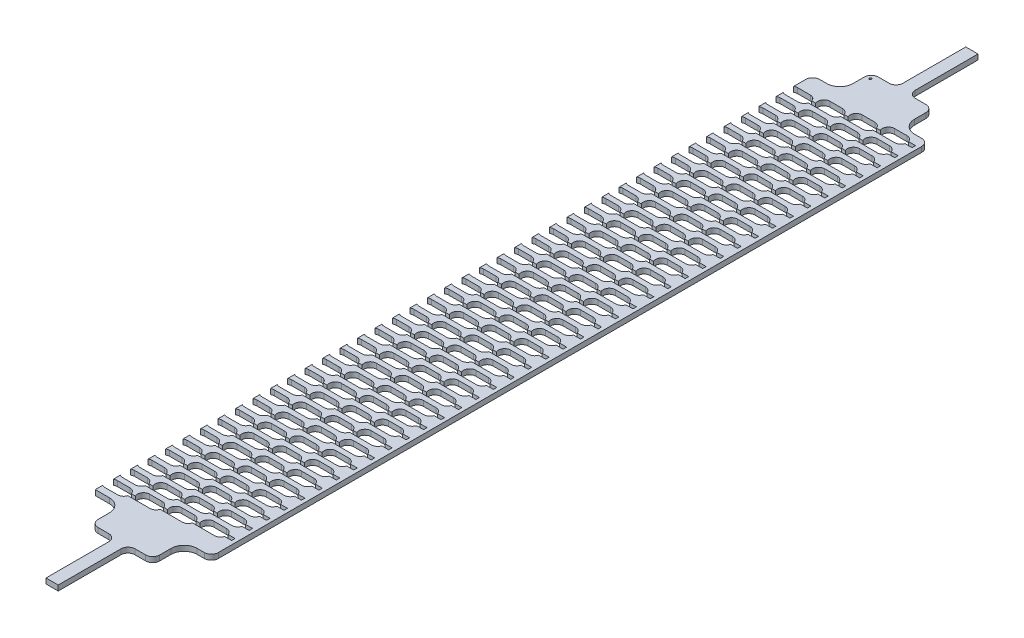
SolidWorks part; units mm, degrees
ref_plane "Alzado" through (0, 0, 0) normal (0, 0, 1) x (1, 0, 0)
ref_plane "Planta" through (0, 0, 0) normal (0, 1, 0) x (1, 0, 0)
ref_plane "Vista lateral" through (0, 0, 0) normal (1, 0, 0) x (0, 0, -1)
sketch "Croquis1" plane through (0, 0, 0) normal (0, 1, 0) x (1, 0, 0)
  line L0 (15.6, 411.2) -> (15.6, 429.2)
  line L1 (0, 0) -> (15.6, 0)
  line L2 (0, 0) -> (0, 4.2983)
  line L3 (0, 411.2) -> (15.6, 411.2)
  line L4 (66.5, 0) -> (66.5, 411.2)
  line L5 (15.6, 429.2) -> (29.75, 429.2)
  line L6 (29.75, 429.2) -> (29.75, 469.2)
  line L7 (29.75, 469.2) -> (36.75, 469.2)
  line L8 (36.75, 469.2) -> (36.75, 429.2)
  line L9 (36.75, 429.2) -> (50.9, 429.2)
  line L10 (50.9, 429.2) -> (50.9, 411.2)
  line L11 (50.9, 411.2) -> (66.5, 411.2)
  line L12 (15.6, 420.2) -> (50.9, 420.2) construction
  line L13 (50.9, 0) -> (50.9, -18)
  line L20 (50.9, -18) -> (36.75, -18)
  line L21 (36.75, -18) -> (36.75, -58)
  line L22 (36.75, -58) -> (29.75, -58)
  line L23 (29.75, -58) -> (29.75, -18)
  line L24 (29.75, -18) -> (15.6, -18)
  line L25 (15.6, -18) -> (15.6, 0)
  line L26 (50.9, 0) -> (66.5, 0)
  line L27 (15.6, -9) -> (50.9, -9) construction
  line L28 (49.8, 408.3) -> (57, 408.3)
  line L35 (49.8, 401.3) -> (57, 401.3)
  line L36 (33.8, 398.8) -> (41, 398.8)
  line L37 (33.8, 405.8) -> (41, 405.8)
  line L38 (17.8, 396.3) -> (25, 396.3)
  line L39 (17.8, 403.3) -> (25, 403.3)
  line L40 (1.8, 393.8) -> (9, 393.8)
  line L41 (1.8, 400.8) -> (9, 400.8)
  line L42 (0, 400.3017) -> (0, 411.2)
  line L43 (49.8, 398.3) -> (57, 398.3)
  line L44 (49.8, 391.3) -> (57, 391.3)
  line L45 (33.8, 395.8) -> (41, 395.8)
  line L46 (33.8, 388.8) -> (41, 388.8)
  line L47 (17.8, 393.3) -> (25, 393.3)
  line L48 (17.8, 386.3) -> (25, 386.3)
  line L49 (1.8, 390.8) -> (9, 390.8)
  line L50 (1.8, 383.8) -> (9, 383.8)
  line L51 (49.8, 388.3) -> (57, 388.3)
  line L52 (49.8, 381.3) -> (57, 381.3)
  line L53 (33.8, 385.8) -> (41, 385.8)
  line L54 (33.8, 378.8) -> (41, 378.8)
  line L55 (17.8, 383.3) -> (25, 383.3)
  line L56 (17.8, 376.3) -> (25, 376.3)
  line L57 (1.8, 380.8) -> (9, 380.8)
  line L58 (1.8, 373.8) -> (9, 373.8)
  line L59 (49.8, 378.3) -> (57, 378.3)
  line L60 (49.8, 371.3) -> (57, 371.3)
  line L61 (33.8, 375.8) -> (41, 375.8)
  line L62 (33.8, 368.8) -> (41, 368.8)
  line L63 (17.8, 373.3) -> (25, 373.3)
  line L64 (17.8, 366.3) -> (25, 366.3)
  line L65 (1.8, 370.8) -> (9, 370.8)
  line L66 (1.8, 363.8) -> (9, 363.8)
  line L67 (49.8, 368.3) -> (57, 368.3)
  line L68 (49.8, 361.3) -> (57, 361.3)
  line L69 (33.8, 365.8) -> (41, 365.8)
  line L70 (33.8, 358.8) -> (41, 358.8)
  line L71 (17.8, 363.3) -> (25, 363.3)
  line L72 (17.8, 356.3) -> (25, 356.3)
  line L73 (1.8, 360.8) -> (9, 360.8)
  line L74 (1.8, 353.8) -> (9, 353.8)
  line L75 (49.8, 358.3) -> (57, 358.3)
  line L76 (49.8, 351.3) -> (57, 351.3)
  line L77 (33.8, 355.8) -> (41, 355.8)
  line L78 (33.8, 348.8) -> (41, 348.8)
  line L79 (17.8, 353.3) -> (25, 353.3)
  line L80 (17.8, 346.3) -> (25, 346.3)
  line L81 (1.8, 350.8) -> (9, 350.8)
  line L82 (1.8, 343.8) -> (9, 343.8)
  line L83 (49.8, 348.3) -> (57, 348.3)
  line L84 (49.8, 341.3) -> (57, 341.3)
  line L85 (33.8, 345.8) -> (41, 345.8)
  line L86 (33.8, 338.8) -> (41, 338.8)
  line L87 (17.8, 343.3) -> (25, 343.3)
  line L88 (17.8, 336.3) -> (25, 336.3)
  line L89 (1.8, 340.8) -> (9, 340.8)
  line L90 (1.8, 333.8) -> (9, 333.8)
  line L91 (49.8, 338.3) -> (57, 338.3)
  line L92 (49.8, 331.3) -> (57, 331.3)
  line L93 (33.8, 335.8) -> (41, 335.8)
  line L94 (33.8, 328.8) -> (41, 328.8)
  line L95 (17.8, 333.3) -> (25, 333.3)
  line L96 (17.8, 326.3) -> (25, 326.3)
  line L97 (1.8, 330.8) -> (9, 330.8)
  line L98 (1.8, 323.8) -> (9, 323.8)
  line L99 (49.8, 328.3) -> (57, 328.3)
  line L100 (49.8, 321.3) -> (57, 321.3)
  line L101 (33.8, 325.8) -> (41, 325.8)
  line L102 (33.8, 318.8) -> (41, 318.8)
  line L103 (17.8, 323.3) -> (25, 323.3)
  line L104 (17.8, 316.3) -> (25, 316.3)
  line L105 (1.8, 320.8) -> (9, 320.8)
  line L106 (1.8, 313.8) -> (9, 313.8)
  line L107 (49.8, 318.3) -> (57, 318.3)
  line L108 (49.8, 311.3) -> (57, 311.3)
  line L109 (33.8, 315.8) -> (41, 315.8)
  line L110 (33.8, 308.8) -> (41, 308.8)
  line L111 (17.8, 313.3) -> (25, 313.3)
  line L112 (17.8, 306.3) -> (25, 306.3)
  line L113 (1.8, 310.8) -> (9, 310.8)
  line L114 (1.8, 303.8) -> (9, 303.8)
  line L115 (49.8, 308.3) -> (57, 308.3)
  line L116 (49.8, 301.3) -> (57, 301.3)
  line L117 (33.8, 305.8) -> (41, 305.8)
  line L118 (33.8, 298.8) -> (41, 298.8)
  line L119 (17.8, 303.3) -> (25, 303.3)
  line L120 (17.8, 296.3) -> (25, 296.3)
  line L121 (1.8, 300.8) -> (9, 300.8)
  line L122 (1.8, 293.8) -> (9, 293.8)
  line L123 (49.8, 298.3) -> (57, 298.3)
  line L124 (49.8, 291.3) -> (57, 291.3)
  line L125 (33.8, 295.8) -> (41, 295.8)
  line L126 (33.8, 288.8) -> (41, 288.8)
  line L127 (17.8, 293.3) -> (25, 293.3)
  line L128 (17.8, 286.3) -> (25, 286.3)
  line L129 (1.8, 290.8) -> (9, 290.8)
  line L130 (1.8, 283.8) -> (9, 283.8)
  line L131 (49.8, 288.3) -> (57, 288.3)
  line L132 (49.8, 281.3) -> (57, 281.3)
  line L133 (33.8, 285.8) -> (41, 285.8)
  line L134 (33.8, 278.8) -> (41, 278.8)
  line L135 (17.8, 283.3) -> (25, 283.3)
  line L136 (17.8, 276.3) -> (25, 276.3)
  line L137 (1.8, 280.8) -> (9, 280.8)
  line L138 (1.8, 273.8) -> (9, 273.8)
  line L139 (49.8, 278.3) -> (57, 278.3)
  line L140 (49.8, 271.3) -> (57, 271.3)
  line L141 (33.8, 275.8) -> (41, 275.8)
  line L142 (33.8, 268.8) -> (41, 268.8)
  line L143 (17.8, 273.3) -> (25, 273.3)
  line L144 (17.8, 266.3) -> (25, 266.3)
  line L145 (1.8, 270.8) -> (9, 270.8)
  line L146 (1.8, 263.8) -> (9, 263.8)
  line L147 (49.8, 268.3) -> (57, 268.3)
  line L148 (49.8, 261.3) -> (57, 261.3)
  line L149 (33.8, 265.8) -> (41, 265.8)
  line L150 (33.8, 258.8) -> (41, 258.8)
  line L151 (17.8, 263.3) -> (25, 263.3)
  line L152 (17.8, 256.3) -> (25, 256.3)
  line L153 (1.8, 260.8) -> (9, 260.8)
  line L154 (1.8, 253.8) -> (9, 253.8)
  line L155 (49.8, 258.3) -> (57, 258.3)
  line L156 (49.8, 251.3) -> (57, 251.3)
  line L157 (33.8, 255.8) -> (41, 255.8)
  line L158 (33.8, 248.8) -> (41, 248.8)
  line L159 (17.8, 253.3) -> (25, 253.3)
  line L160 (17.8, 246.3) -> (25, 246.3)
  line L161 (1.8, 250.8) -> (9, 250.8)
  line L162 (1.8, 243.8) -> (9, 243.8)
  line L163 (49.8, 248.3) -> (57, 248.3)
  line L164 (49.8, 241.3) -> (57, 241.3)
  line L165 (33.8, 245.8) -> (41, 245.8)
  line L166 (33.8, 238.8) -> (41, 238.8)
  line L167 (17.8, 243.3) -> (25, 243.3)
  line L168 (17.8, 236.3) -> (25, 236.3)
  line L169 (1.8, 240.8) -> (9, 240.8)
  line L170 (1.8, 233.8) -> (9, 233.8)
  line L171 (49.8, 238.3) -> (57, 238.3)
  line L172 (49.8, 231.3) -> (57, 231.3)
  line L173 (33.8, 235.8) -> (41, 235.8)
  line L174 (33.8, 228.8) -> (41, 228.8)
  line L175 (17.8, 233.3) -> (25, 233.3)
  line L176 (17.8, 226.3) -> (25, 226.3)
  line L177 (1.8, 230.8) -> (9, 230.8)
  line L178 (1.8, 223.8) -> (9, 223.8)
  line L179 (49.8, 228.3) -> (57, 228.3)
  line L180 (49.8, 221.3) -> (57, 221.3)
  line L181 (33.8, 225.8) -> (41, 225.8)
  line L182 (33.8, 218.8) -> (41, 218.8)
  line L183 (17.8, 223.3) -> (25, 223.3)
  line L184 (17.8, 216.3) -> (25, 216.3)
  line L185 (1.8, 220.8) -> (9, 220.8)
  line L186 (1.8, 213.8) -> (9, 213.8)
  line L187 (49.8, 218.3) -> (57, 218.3)
  line L188 (49.8, 211.3) -> (57, 211.3)
  line L189 (33.8, 215.8) -> (41, 215.8)
  line L190 (33.8, 208.8) -> (41, 208.8)
  line L191 (17.8, 213.3) -> (25, 213.3)
  line L192 (17.8, 206.3) -> (25, 206.3)
  line L193 (1.8, 210.8) -> (9, 210.8)
  line L194 (1.8, 203.8) -> (9, 203.8)
  line L195 (49.8, 208.3) -> (57, 208.3)
  line L196 (49.8, 201.3) -> (57, 201.3)
  line L197 (33.8, 205.8) -> (41, 205.8)
  line L198 (33.8, 198.8) -> (41, 198.8)
  line L199 (17.8, 203.3) -> (25, 203.3)
  line L200 (17.8, 196.3) -> (25, 196.3)
  line L201 (1.8, 200.8) -> (9, 200.8)
  line L202 (1.8, 193.8) -> (9, 193.8)
  line L203 (49.8, 198.3) -> (57, 198.3)
  line L204 (49.8, 191.3) -> (57, 191.3)
  line L205 (33.8, 195.8) -> (41, 195.8)
  line L206 (33.8, 188.8) -> (41, 188.8)
  line L207 (17.8, 193.3) -> (25, 193.3)
  line L208 (17.8, 186.3) -> (25, 186.3)
  line L209 (1.8, 190.8) -> (9, 190.8)
  line L210 (1.8, 183.8) -> (9, 183.8)
  line L211 (49.8, 188.3) -> (57, 188.3)
  line L212 (49.8, 181.3) -> (57, 181.3)
  line L213 (33.8, 185.8) -> (41, 185.8)
  line L214 (33.8, 178.8) -> (41, 178.8)
  line L215 (17.8, 183.3) -> (25, 183.3)
  line L216 (17.8, 176.3) -> (25, 176.3)
  line L217 (1.8, 180.8) -> (9, 180.8)
  line L218 (1.8, 173.8) -> (9, 173.8)
  line L219 (49.8, 178.3) -> (57, 178.3)
  line L220 (49.8, 171.3) -> (57, 171.3)
  line L221 (33.8, 175.8) -> (41, 175.8)
  line L222 (33.8, 168.8) -> (41, 168.8)
  line L223 (17.8, 173.3) -> (25, 173.3)
  line L224 (17.8, 166.3) -> (25, 166.3)
  line L225 (1.8, 170.8) -> (9, 170.8)
  line L226 (1.8, 163.8) -> (9, 163.8)
  line L227 (49.8, 168.3) -> (57, 168.3)
  line L228 (49.8, 161.3) -> (57, 161.3)
  line L229 (33.8, 165.8) -> (41, 165.8)
  line L230 (33.8, 158.8) -> (41, 158.8)
  line L231 (17.8, 163.3) -> (25, 163.3)
  line L232 (17.8, 156.3) -> (25, 156.3)
  line L233 (1.8, 160.8) -> (9, 160.8)
  line L234 (1.8, 153.8) -> (9, 153.8)
  line L235 (49.8, 158.3) -> (57, 158.3)
  line L236 (49.8, 151.3) -> (57, 151.3)
  line L237 (33.8, 155.8) -> (41, 155.8)
  line L238 (33.8, 148.8) -> (41, 148.8)
  line L239 (17.8, 153.3) -> (25, 153.3)
  line L240 (17.8, 146.3) -> (25, 146.3)
  line L241 (1.8, 150.8) -> (9, 150.8)
  line L242 (1.8, 143.8) -> (9, 143.8)
  line L243 (49.8, 148.3) -> (57, 148.3)
  line L244 (49.8, 141.3) -> (57, 141.3)
  line L245 (33.8, 145.8) -> (41, 145.8)
  line L246 (33.8, 138.8) -> (41, 138.8)
  line L247 (17.8, 143.3) -> (25, 143.3)
  line L248 (17.8, 136.3) -> (25, 136.3)
  line L249 (1.8, 140.8) -> (9, 140.8)
  line L250 (1.8, 133.8) -> (9, 133.8)
  line L251 (49.8, 138.3) -> (57, 138.3)
  line L252 (49.8, 131.3) -> (57, 131.3)
  line L253 (33.8, 135.8) -> (41, 135.8)
  line L254 (33.8, 128.8) -> (41, 128.8)
  line L255 (17.8, 133.3) -> (25, 133.3)
  line L256 (17.8, 126.3) -> (25, 126.3)
  line L257 (1.8, 130.8) -> (9, 130.8)
  line L258 (1.8, 123.8) -> (9, 123.8)
  line L259 (49.8, 128.3) -> (57, 128.3)
  line L260 (49.8, 121.3) -> (57, 121.3)
  line L261 (33.8, 125.8) -> (41, 125.8)
  line L262 (33.8, 118.8) -> (41, 118.8)
  line L263 (17.8, 123.3) -> (25, 123.3)
  line L264 (17.8, 116.3) -> (25, 116.3)
  line L265 (1.8, 120.8) -> (9, 120.8)
  line L266 (1.8, 113.8) -> (9, 113.8)
  line L267 (49.8, 118.3) -> (57, 118.3)
  line L268 (49.8, 111.3) -> (57, 111.3)
  line L269 (33.8, 115.8) -> (41, 115.8)
  line L270 (33.8, 108.8) -> (41, 108.8)
  line L271 (17.8, 113.3) -> (25, 113.3)
  line L272 (17.8, 106.3) -> (25, 106.3)
  line L273 (1.8, 110.8) -> (9, 110.8)
  line L274 (1.8, 103.8) -> (9, 103.8)
  line L275 (49.8, 108.3) -> (57, 108.3)
  line L276 (49.8, 101.3) -> (57, 101.3)
  line L277 (33.8, 105.8) -> (41, 105.8)
  line L278 (33.8, 98.8) -> (41, 98.8)
  line L279 (17.8, 103.3) -> (25, 103.3)
  line L280 (17.8, 96.3) -> (25, 96.3)
  line L281 (1.8, 100.8) -> (9, 100.8)
  line L282 (1.8, 93.8) -> (9, 93.8)
  line L283 (49.8, 98.3) -> (57, 98.3)
  line L284 (49.8, 91.3) -> (57, 91.3)
  line L285 (33.8, 95.8) -> (41, 95.8)
  line L286 (33.8, 88.8) -> (41, 88.8)
  line L287 (17.8, 93.3) -> (25, 93.3)
  line L288 (17.8, 86.3) -> (25, 86.3)
  line L289 (1.8, 90.8) -> (9, 90.8)
  line L290 (1.8, 83.8) -> (9, 83.8)
  line L291 (49.8, 88.3) -> (57, 88.3)
  line L292 (49.8, 81.3) -> (57, 81.3)
  line L293 (33.8, 85.8) -> (41, 85.8)
  line L294 (33.8, 78.8) -> (41, 78.8)
  line L295 (17.8, 83.3) -> (25, 83.3)
  line L296 (17.8, 76.3) -> (25, 76.3)
  line L297 (1.8, 80.8) -> (9, 80.8)
  line L298 (1.8, 73.8) -> (9, 73.8)
  line L299 (49.8, 78.3) -> (57, 78.3)
  line L300 (49.8, 71.3) -> (57, 71.3)
  line L301 (33.8, 75.8) -> (41, 75.8)
  line L302 (33.8, 68.8) -> (41, 68.8)
  line L303 (17.8, 73.3) -> (25, 73.3)
  line L304 (17.8, 66.3) -> (25, 66.3)
  line L305 (1.8, 70.8) -> (9, 70.8)
  line L306 (1.8, 63.8) -> (9, 63.8)
  line L307 (49.8, 68.3) -> (57, 68.3)
  line L308 (49.8, 61.3) -> (57, 61.3)
  line L309 (33.8, 65.8) -> (41, 65.8)
  line L310 (33.8, 58.8) -> (41, 58.8)
  line L311 (17.8, 63.3) -> (25, 63.3)
  line L312 (17.8, 56.3) -> (25, 56.3)
  line L313 (1.8, 60.8) -> (9, 60.8)
  line L314 (1.8, 53.8) -> (9, 53.8)
  line L315 (49.8, 58.3) -> (57, 58.3)
  line L316 (49.8, 51.3) -> (57, 51.3)
  line L317 (33.8, 55.8) -> (41, 55.8)
  line L318 (33.8, 48.8) -> (41, 48.8)
  line L319 (17.8, 53.3) -> (25, 53.3)
  line L320 (17.8, 46.3) -> (25, 46.3)
  line L321 (1.8, 50.8) -> (9, 50.8)
  line L322 (1.8, 43.8) -> (9, 43.8)
  line L323 (49.8, 48.3) -> (57, 48.3)
  line L324 (49.8, 41.3) -> (57, 41.3)
  line L325 (33.8, 45.8) -> (41, 45.8)
  line L326 (33.8, 38.8) -> (41, 38.8)
  line L327 (17.8, 43.3) -> (25, 43.3)
  line L328 (17.8, 36.3) -> (25, 36.3)
  line L329 (1.8, 40.8) -> (9, 40.8)
  line L330 (1.8, 33.8) -> (9, 33.8)
  line L331 (49.8, 38.3) -> (57, 38.3)
  line L332 (49.8, 31.3) -> (57, 31.3)
  line L333 (33.8, 35.8) -> (41, 35.8)
  line L334 (33.8, 28.8) -> (41, 28.8)
  line L335 (17.8, 33.3) -> (25, 33.3)
  line L336 (17.8, 26.3) -> (25, 26.3)
  line L337 (1.8, 30.8) -> (9, 30.8)
  line L338 (1.8, 23.8) -> (9, 23.8)
  line L339 (49.8, 28.3) -> (57, 28.3)
  line L340 (49.8, 21.3) -> (57, 21.3)
  line L341 (33.8, 25.8) -> (41, 25.8)
  line L342 (33.8, 18.8) -> (41, 18.8)
  line L343 (17.8, 23.3) -> (25, 23.3)
  line L344 (17.8, 16.3) -> (25, 16.3)
  line L345 (1.8, 20.8) -> (9, 20.8)
  line L346 (1.8, 13.8) -> (9, 13.8)
  line L347 (49.8, 18.3) -> (57, 18.3)
  line L348 (49.8, 11.3) -> (57, 11.3)
  line L349 (33.8, 15.8) -> (41, 15.8)
  line L350 (33.8, 8.8) -> (41, 8.8)
  line L351 (17.8, 13.3) -> (25, 13.3)
  line L352 (17.8, 6.3) -> (25, 6.3)
  line L353 (1.8, 10.8) -> (9, 10.8)
  line L354 (1.8, 3.8) -> (9, 3.8)
  line L355 (0, 10.3017) -> (0, 14.2983)
  line L356 (0, 20.3017) -> (0, 24.2983)
  line L357 (0, 30.3017) -> (0, 34.2983)
  line L358 (0, 40.3017) -> (0, 44.2983)
  line L359 (0, 50.3017) -> (0, 54.2983)
  line L360 (0, 60.3017) -> (0, 64.2983)
  line L361 (0, 70.3017) -> (0, 74.2983)
  line L362 (0, 80.3017) -> (0, 84.2983)
  line L363 (0, 90.3017) -> (0, 94.2983)
  line L364 (0, 100.3017) -> (0, 104.2983)
  line L365 (0, 110.3017) -> (0, 114.2983)
  line L366 (0, 120.3017) -> (0, 124.2983)
  line L367 (0, 130.3017) -> (0, 134.2983)
  line L368 (0, 140.3017) -> (0, 144.2983)
  line L369 (0, 150.3017) -> (0, 154.2983)
  line L370 (0, 160.3017) -> (0, 164.2983)
  line L371 (0, 170.3017) -> (0, 174.2983)
  line L372 (0, 180.3017) -> (0, 184.2983)
  line L373 (0, 190.3017) -> (0, 194.2983)
  line L374 (0, 200.3017) -> (0, 204.2983)
  line L375 (0, 210.3017) -> (0, 214.2983)
  line L376 (0, 220.3017) -> (0, 224.2983)
  line L377 (0, 230.3017) -> (0, 234.2983)
  line L378 (0, 240.3017) -> (0, 244.2983)
  line L379 (0, 250.3017) -> (0, 254.2983)
  line L380 (0, 260.3017) -> (0, 264.2983)
  line L381 (0, 270.3017) -> (0, 274.2983)
  line L382 (0, 280.3017) -> (0, 284.2983)
  line L383 (0, 290.3017) -> (0, 294.2983)
  line L384 (0, 300.3017) -> (0, 304.2983)
  line L385 (0, 310.3017) -> (0, 314.2983)
  line L386 (0, 320.3017) -> (0, 324.2983)
  line L387 (0, 330.3017) -> (0, 334.2983)
  line L388 (0, 340.3017) -> (0, 344.2983)
  line L389 (0, 350.3017) -> (0, 354.2983)
  line L390 (0, 360.3017) -> (0, 364.2983)
  line L391 (0, 370.3017) -> (0, 374.2983)
  line L392 (0, 380.3017) -> (0, 384.2983)
  line L393 (0, 390.3017) -> (0, 394.2983)
  arc A0 (57, 401.3) -> (57, 408.3) centre (57, 404.8) ccw
  arc A1 (49.8, 408.3) -> (49.8, 401.3) centre (49.8, 404.8) ccw
  arc A2 (41, 398.8) -> (41, 405.8) centre (41, 402.3) ccw
  arc A3 (33.8, 405.8) -> (33.8, 398.8) centre (33.8, 402.3) ccw
  arc A4 (25, 396.3) -> (25, 403.3) centre (25, 399.8) ccw
  arc A5 (17.8, 403.3) -> (17.8, 396.3) centre (17.8, 399.8) ccw
  arc A6 (9, 393.8) -> (9, 400.8) centre (9, 397.3) ccw
  arc A7 (1.8, 400.8) -> (0, 400.3017) centre (1.8, 397.3) ccw
  arc A8 (0, 394.2983) -> (1.8, 393.8) centre (1.8, 397.3) ccw
  arc A9 (57, 391.3) -> (57, 398.3) centre (57, 394.8) ccw
  arc A10 (49.8, 398.3) -> (49.8, 391.3) centre (49.8, 394.8) ccw
  arc A11 (41, 388.8) -> (41, 395.8) centre (41, 392.3) ccw
  arc A12 (33.8, 395.8) -> (33.8, 388.8) centre (33.8, 392.3) ccw
  arc A13 (25, 386.3) -> (25, 393.3) centre (25, 389.8) ccw
  arc A14 (17.8, 393.3) -> (17.8, 386.3) centre (17.8, 389.8) ccw
  arc A15 (9, 383.8) -> (9, 390.8) centre (9, 387.3) ccw
  arc A16 (1.8, 390.8) -> (0, 390.3017) centre (1.8, 387.3) ccw
  arc A17 (0, 384.2983) -> (1.8, 383.8) centre (1.8, 387.3) ccw
  arc A18 (57, 381.3) -> (57, 388.3) centre (57, 384.8) ccw
  arc A19 (49.8, 388.3) -> (49.8, 381.3) centre (49.8, 384.8) ccw
  arc A20 (41, 378.8) -> (41, 385.8) centre (41, 382.3) ccw
  arc A21 (33.8, 385.8) -> (33.8, 378.8) centre (33.8, 382.3) ccw
  arc A22 (25, 376.3) -> (25, 383.3) centre (25, 379.8) ccw
  arc A23 (17.8, 383.3) -> (17.8, 376.3) centre (17.8, 379.8) ccw
  arc A24 (9, 373.8) -> (9, 380.8) centre (9, 377.3) ccw
  arc A25 (1.8, 380.8) -> (0, 380.3017) centre (1.8, 377.3) ccw
  arc A26 (0, 374.2983) -> (1.8, 373.8) centre (1.8, 377.3) ccw
  arc A27 (57, 371.3) -> (57, 378.3) centre (57, 374.8) ccw
  arc A28 (49.8, 378.3) -> (49.8, 371.3) centre (49.8, 374.8) ccw
  arc A29 (41, 368.8) -> (41, 375.8) centre (41, 372.3) ccw
  arc A30 (33.8, 375.8) -> (33.8, 368.8) centre (33.8, 372.3) ccw
  arc A31 (25, 366.3) -> (25, 373.3) centre (25, 369.8) ccw
  arc A32 (17.8, 373.3) -> (17.8, 366.3) centre (17.8, 369.8) ccw
  arc A33 (9, 363.8) -> (9, 370.8) centre (9, 367.3) ccw
  arc A34 (1.8, 370.8) -> (0, 370.3017) centre (1.8, 367.3) ccw
  arc A35 (0, 364.2983) -> (1.8, 363.8) centre (1.8, 367.3) ccw
  arc A36 (57, 361.3) -> (57, 368.3) centre (57, 364.8) ccw
  arc A37 (49.8, 368.3) -> (49.8, 361.3) centre (49.8, 364.8) ccw
  arc A38 (41, 358.8) -> (41, 365.8) centre (41, 362.3) ccw
  arc A39 (33.8, 365.8) -> (33.8, 358.8) centre (33.8, 362.3) ccw
  arc A40 (25, 356.3) -> (25, 363.3) centre (25, 359.8) ccw
  arc A41 (17.8, 363.3) -> (17.8, 356.3) centre (17.8, 359.8) ccw
  arc A42 (9, 353.8) -> (9, 360.8) centre (9, 357.3) ccw
  arc A43 (1.8, 360.8) -> (0, 360.3017) centre (1.8, 357.3) ccw
  arc A44 (0, 354.2983) -> (1.8, 353.8) centre (1.8, 357.3) ccw
  arc A45 (57, 351.3) -> (57, 358.3) centre (57, 354.8) ccw
  arc A46 (49.8, 358.3) -> (49.8, 351.3) centre (49.8, 354.8) ccw
  arc A47 (41, 348.8) -> (41, 355.8) centre (41, 352.3) ccw
  arc A48 (33.8, 355.8) -> (33.8, 348.8) centre (33.8, 352.3) ccw
  arc A49 (25, 346.3) -> (25, 353.3) centre (25, 349.8) ccw
  arc A50 (17.8, 353.3) -> (17.8, 346.3) centre (17.8, 349.8) ccw
  arc A51 (9, 343.8) -> (9, 350.8) centre (9, 347.3) ccw
  arc A52 (1.8, 350.8) -> (0, 350.3017) centre (1.8, 347.3) ccw
  arc A53 (0, 344.2983) -> (1.8, 343.8) centre (1.8, 347.3) ccw
  arc A54 (57, 341.3) -> (57, 348.3) centre (57, 344.8) ccw
  arc A55 (49.8, 348.3) -> (49.8, 341.3) centre (49.8, 344.8) ccw
  arc A56 (41, 338.8) -> (41, 345.8) centre (41, 342.3) ccw
  arc A57 (33.8, 345.8) -> (33.8, 338.8) centre (33.8, 342.3) ccw
  arc A58 (25, 336.3) -> (25, 343.3) centre (25, 339.8) ccw
  arc A59 (17.8, 343.3) -> (17.8, 336.3) centre (17.8, 339.8) ccw
  arc A60 (9, 333.8) -> (9, 340.8) centre (9, 337.3) ccw
  arc A61 (1.8, 340.8) -> (0, 340.3017) centre (1.8, 337.3) ccw
  arc A62 (0, 334.2983) -> (1.8, 333.8) centre (1.8, 337.3) ccw
  arc A63 (57, 331.3) -> (57, 338.3) centre (57, 334.8) ccw
  arc A64 (49.8, 338.3) -> (49.8, 331.3) centre (49.8, 334.8) ccw
  arc A65 (41, 328.8) -> (41, 335.8) centre (41, 332.3) ccw
  arc A66 (33.8, 335.8) -> (33.8, 328.8) centre (33.8, 332.3) ccw
  arc A67 (25, 326.3) -> (25, 333.3) centre (25, 329.8) ccw
  arc A68 (17.8, 333.3) -> (17.8, 326.3) centre (17.8, 329.8) ccw
  arc A69 (9, 323.8) -> (9, 330.8) centre (9, 327.3) ccw
  arc A70 (1.8, 330.8) -> (0, 330.3017) centre (1.8, 327.3) ccw
  arc A71 (0, 324.2983) -> (1.8, 323.8) centre (1.8, 327.3) ccw
  arc A72 (57, 321.3) -> (57, 328.3) centre (57, 324.8) ccw
  arc A73 (49.8, 328.3) -> (49.8, 321.3) centre (49.8, 324.8) ccw
  arc A74 (41, 318.8) -> (41, 325.8) centre (41, 322.3) ccw
  arc A75 (33.8, 325.8) -> (33.8, 318.8) centre (33.8, 322.3) ccw
  arc A76 (25, 316.3) -> (25, 323.3) centre (25, 319.8) ccw
  arc A77 (17.8, 323.3) -> (17.8, 316.3) centre (17.8, 319.8) ccw
  arc A78 (9, 313.8) -> (9, 320.8) centre (9, 317.3) ccw
  arc A79 (1.8, 320.8) -> (0, 320.3017) centre (1.8, 317.3) ccw
  arc A80 (0, 314.2983) -> (1.8, 313.8) centre (1.8, 317.3) ccw
  arc A81 (57, 311.3) -> (57, 318.3) centre (57, 314.8) ccw
  arc A82 (49.8, 318.3) -> (49.8, 311.3) centre (49.8, 314.8) ccw
  arc A83 (41, 308.8) -> (41, 315.8) centre (41, 312.3) ccw
  arc A84 (33.8, 315.8) -> (33.8, 308.8) centre (33.8, 312.3) ccw
  arc A85 (25, 306.3) -> (25, 313.3) centre (25, 309.8) ccw
  arc A86 (17.8, 313.3) -> (17.8, 306.3) centre (17.8, 309.8) ccw
  arc A87 (9, 303.8) -> (9, 310.8) centre (9, 307.3) ccw
  arc A88 (1.8, 310.8) -> (0, 310.3017) centre (1.8, 307.3) ccw
  arc A89 (0, 304.2983) -> (1.8, 303.8) centre (1.8, 307.3) ccw
  arc A90 (57, 301.3) -> (57, 308.3) centre (57, 304.8) ccw
  arc A91 (49.8, 308.3) -> (49.8, 301.3) centre (49.8, 304.8) ccw
  arc A92 (41, 298.8) -> (41, 305.8) centre (41, 302.3) ccw
  arc A93 (33.8, 305.8) -> (33.8, 298.8) centre (33.8, 302.3) ccw
  arc A94 (25, 296.3) -> (25, 303.3) centre (25, 299.8) ccw
  arc A95 (17.8, 303.3) -> (17.8, 296.3) centre (17.8, 299.8) ccw
  arc A96 (9, 293.8) -> (9, 300.8) centre (9, 297.3) ccw
  arc A97 (1.8, 300.8) -> (0, 300.3017) centre (1.8, 297.3) ccw
  arc A98 (0, 294.2983) -> (1.8, 293.8) centre (1.8, 297.3) ccw
  arc A99 (57, 291.3) -> (57, 298.3) centre (57, 294.8) ccw
  arc A100 (49.8, 298.3) -> (49.8, 291.3) centre (49.8, 294.8) ccw
  arc A101 (41, 288.8) -> (41, 295.8) centre (41, 292.3) ccw
  arc A102 (33.8, 295.8) -> (33.8, 288.8) centre (33.8, 292.3) ccw
  arc A103 (25, 286.3) -> (25, 293.3) centre (25, 289.8) ccw
  arc A104 (17.8, 293.3) -> (17.8, 286.3) centre (17.8, 289.8) ccw
  arc A105 (9, 283.8) -> (9, 290.8) centre (9, 287.3) ccw
  arc A106 (1.8, 290.8) -> (0, 290.3017) centre (1.8, 287.3) ccw
  arc A107 (0, 284.2983) -> (1.8, 283.8) centre (1.8, 287.3) ccw
  arc A108 (57, 281.3) -> (57, 288.3) centre (57, 284.8) ccw
  arc A109 (49.8, 288.3) -> (49.8, 281.3) centre (49.8, 284.8) ccw
  arc A110 (41, 278.8) -> (41, 285.8) centre (41, 282.3) ccw
  arc A111 (33.8, 285.8) -> (33.8, 278.8) centre (33.8, 282.3) ccw
  arc A112 (25, 276.3) -> (25, 283.3) centre (25, 279.8) ccw
  arc A113 (17.8, 283.3) -> (17.8, 276.3) centre (17.8, 279.8) ccw
  arc A114 (9, 273.8) -> (9, 280.8) centre (9, 277.3) ccw
  arc A115 (1.8, 280.8) -> (0, 280.3017) centre (1.8, 277.3) ccw
  arc A116 (0, 274.2983) -> (1.8, 273.8) centre (1.8, 277.3) ccw
  arc A117 (57, 271.3) -> (57, 278.3) centre (57, 274.8) ccw
  arc A118 (49.8, 278.3) -> (49.8, 271.3) centre (49.8, 274.8) ccw
  arc A119 (41, 268.8) -> (41, 275.8) centre (41, 272.3) ccw
  arc A120 (33.8, 275.8) -> (33.8, 268.8) centre (33.8, 272.3) ccw
  arc A121 (25, 266.3) -> (25, 273.3) centre (25, 269.8) ccw
  arc A122 (17.8, 273.3) -> (17.8, 266.3) centre (17.8, 269.8) ccw
  arc A123 (9, 263.8) -> (9, 270.8) centre (9, 267.3) ccw
  arc A124 (1.8, 270.8) -> (0, 270.3017) centre (1.8, 267.3) ccw
  arc A125 (0, 264.2983) -> (1.8, 263.8) centre (1.8, 267.3) ccw
  arc A126 (57, 261.3) -> (57, 268.3) centre (57, 264.8) ccw
  arc A127 (49.8, 268.3) -> (49.8, 261.3) centre (49.8, 264.8) ccw
  arc A128 (41, 258.8) -> (41, 265.8) centre (41, 262.3) ccw
  arc A129 (33.8, 265.8) -> (33.8, 258.8) centre (33.8, 262.3) ccw
  arc A130 (25, 256.3) -> (25, 263.3) centre (25, 259.8) ccw
  arc A131 (17.8, 263.3) -> (17.8, 256.3) centre (17.8, 259.8) ccw
  arc A132 (9, 253.8) -> (9, 260.8) centre (9, 257.3) ccw
  arc A133 (1.8, 260.8) -> (0, 260.3017) centre (1.8, 257.3) ccw
  arc A134 (0, 254.2983) -> (1.8, 253.8) centre (1.8, 257.3) ccw
  arc A135 (57, 251.3) -> (57, 258.3) centre (57, 254.8) ccw
  arc A136 (49.8, 258.3) -> (49.8, 251.3) centre (49.8, 254.8) ccw
  arc A137 (41, 248.8) -> (41, 255.8) centre (41, 252.3) ccw
  arc A138 (33.8, 255.8) -> (33.8, 248.8) centre (33.8, 252.3) ccw
  arc A139 (25, 246.3) -> (25, 253.3) centre (25, 249.8) ccw
  arc A140 (17.8, 253.3) -> (17.8, 246.3) centre (17.8, 249.8) ccw
  arc A141 (9, 243.8) -> (9, 250.8) centre (9, 247.3) ccw
  arc A142 (1.8, 250.8) -> (0, 250.3017) centre (1.8, 247.3) ccw
  arc A143 (0, 244.2983) -> (1.8, 243.8) centre (1.8, 247.3) ccw
  arc A144 (57, 241.3) -> (57, 248.3) centre (57, 244.8) ccw
  arc A145 (49.8, 248.3) -> (49.8, 241.3) centre (49.8, 244.8) ccw
  arc A146 (41, 238.8) -> (41, 245.8) centre (41, 242.3) ccw
  arc A147 (33.8, 245.8) -> (33.8, 238.8) centre (33.8, 242.3) ccw
  arc A148 (25, 236.3) -> (25, 243.3) centre (25, 239.8) ccw
  arc A149 (17.8, 243.3) -> (17.8, 236.3) centre (17.8, 239.8) ccw
  arc A150 (9, 233.8) -> (9, 240.8) centre (9, 237.3) ccw
  arc A151 (1.8, 240.8) -> (0, 240.3017) centre (1.8, 237.3) ccw
  arc A152 (0, 234.2983) -> (1.8, 233.8) centre (1.8, 237.3) ccw
  arc A153 (57, 231.3) -> (57, 238.3) centre (57, 234.8) ccw
  arc A154 (49.8, 238.3) -> (49.8, 231.3) centre (49.8, 234.8) ccw
  arc A155 (41, 228.8) -> (41, 235.8) centre (41, 232.3) ccw
  arc A156 (33.8, 235.8) -> (33.8, 228.8) centre (33.8, 232.3) ccw
  arc A157 (25, 226.3) -> (25, 233.3) centre (25, 229.8) ccw
  arc A158 (17.8, 233.3) -> (17.8, 226.3) centre (17.8, 229.8) ccw
  arc A159 (9, 223.8) -> (9, 230.8) centre (9, 227.3) ccw
  arc A160 (1.8, 230.8) -> (0, 230.3017) centre (1.8, 227.3) ccw
  arc A161 (0, 224.2983) -> (1.8, 223.8) centre (1.8, 227.3) ccw
  arc A162 (57, 221.3) -> (57, 228.3) centre (57, 224.8) ccw
  arc A163 (49.8, 228.3) -> (49.8, 221.3) centre (49.8, 224.8) ccw
  arc A164 (41, 218.8) -> (41, 225.8) centre (41, 222.3) ccw
  arc A165 (33.8, 225.8) -> (33.8, 218.8) centre (33.8, 222.3) ccw
  arc A166 (25, 216.3) -> (25, 223.3) centre (25, 219.8) ccw
  arc A167 (17.8, 223.3) -> (17.8, 216.3) centre (17.8, 219.8) ccw
  arc A168 (9, 213.8) -> (9, 220.8) centre (9, 217.3) ccw
  arc A169 (1.8, 220.8) -> (0, 220.3017) centre (1.8, 217.3) ccw
  arc A170 (0, 214.2983) -> (1.8, 213.8) centre (1.8, 217.3) ccw
  arc A171 (57, 211.3) -> (57, 218.3) centre (57, 214.8) ccw
  arc A172 (49.8, 218.3) -> (49.8, 211.3) centre (49.8, 214.8) ccw
  arc A173 (41, 208.8) -> (41, 215.8) centre (41, 212.3) ccw
  arc A174 (33.8, 215.8) -> (33.8, 208.8) centre (33.8, 212.3) ccw
  arc A175 (25, 206.3) -> (25, 213.3) centre (25, 209.8) ccw
  arc A176 (17.8, 213.3) -> (17.8, 206.3) centre (17.8, 209.8) ccw
  arc A177 (9, 203.8) -> (9, 210.8) centre (9, 207.3) ccw
  arc A178 (1.8, 210.8) -> (0, 210.3017) centre (1.8, 207.3) ccw
  arc A179 (0, 204.2983) -> (1.8, 203.8) centre (1.8, 207.3) ccw
  arc A180 (57, 201.3) -> (57, 208.3) centre (57, 204.8) ccw
  arc A181 (49.8, 208.3) -> (49.8, 201.3) centre (49.8, 204.8) ccw
  arc A182 (41, 198.8) -> (41, 205.8) centre (41, 202.3) ccw
  arc A183 (33.8, 205.8) -> (33.8, 198.8) centre (33.8, 202.3) ccw
  arc A184 (25, 196.3) -> (25, 203.3) centre (25, 199.8) ccw
  arc A185 (17.8, 203.3) -> (17.8, 196.3) centre (17.8, 199.8) ccw
  arc A186 (9, 193.8) -> (9, 200.8) centre (9, 197.3) ccw
  arc A187 (1.8, 200.8) -> (0, 200.3017) centre (1.8, 197.3) ccw
  arc A188 (0, 194.2983) -> (1.8, 193.8) centre (1.8, 197.3) ccw
  arc A189 (57, 191.3) -> (57, 198.3) centre (57, 194.8) ccw
  arc A190 (49.8, 198.3) -> (49.8, 191.3) centre (49.8, 194.8) ccw
  arc A191 (41, 188.8) -> (41, 195.8) centre (41, 192.3) ccw
  arc A192 (33.8, 195.8) -> (33.8, 188.8) centre (33.8, 192.3) ccw
  arc A193 (25, 186.3) -> (25, 193.3) centre (25, 189.8) ccw
  arc A194 (17.8, 193.3) -> (17.8, 186.3) centre (17.8, 189.8) ccw
  arc A195 (9, 183.8) -> (9, 190.8) centre (9, 187.3) ccw
  arc A196 (1.8, 190.8) -> (0, 190.3017) centre (1.8, 187.3) ccw
  arc A197 (0, 184.2983) -> (1.8, 183.8) centre (1.8, 187.3) ccw
  arc A198 (57, 181.3) -> (57, 188.3) centre (57, 184.8) ccw
  arc A199 (49.8, 188.3) -> (49.8, 181.3) centre (49.8, 184.8) ccw
  arc A200 (41, 178.8) -> (41, 185.8) centre (41, 182.3) ccw
  arc A201 (33.8, 185.8) -> (33.8, 178.8) centre (33.8, 182.3) ccw
  arc A202 (25, 176.3) -> (25, 183.3) centre (25, 179.8) ccw
  arc A203 (17.8, 183.3) -> (17.8, 176.3) centre (17.8, 179.8) ccw
  arc A204 (9, 173.8) -> (9, 180.8) centre (9, 177.3) ccw
  arc A205 (1.8, 180.8) -> (0, 180.3017) centre (1.8, 177.3) ccw
  arc A206 (0, 174.2983) -> (1.8, 173.8) centre (1.8, 177.3) ccw
  arc A207 (57, 171.3) -> (57, 178.3) centre (57, 174.8) ccw
  arc A208 (49.8, 178.3) -> (49.8, 171.3) centre (49.8, 174.8) ccw
  arc A209 (41, 168.8) -> (41, 175.8) centre (41, 172.3) ccw
  arc A210 (33.8, 175.8) -> (33.8, 168.8) centre (33.8, 172.3) ccw
  arc A211 (25, 166.3) -> (25, 173.3) centre (25, 169.8) ccw
  arc A212 (17.8, 173.3) -> (17.8, 166.3) centre (17.8, 169.8) ccw
  arc A213 (9, 163.8) -> (9, 170.8) centre (9, 167.3) ccw
  arc A214 (1.8, 170.8) -> (0, 170.3017) centre (1.8, 167.3) ccw
  arc A215 (0, 164.2983) -> (1.8, 163.8) centre (1.8, 167.3) ccw
  arc A216 (57, 161.3) -> (57, 168.3) centre (57, 164.8) ccw
  arc A217 (49.8, 168.3) -> (49.8, 161.3) centre (49.8, 164.8) ccw
  arc A218 (41, 158.8) -> (41, 165.8) centre (41, 162.3) ccw
  arc A219 (33.8, 165.8) -> (33.8, 158.8) centre (33.8, 162.3) ccw
  arc A220 (25, 156.3) -> (25, 163.3) centre (25, 159.8) ccw
  arc A221 (17.8, 163.3) -> (17.8, 156.3) centre (17.8, 159.8) ccw
  arc A222 (9, 153.8) -> (9, 160.8) centre (9, 157.3) ccw
  arc A223 (1.8, 160.8) -> (0, 160.3017) centre (1.8, 157.3) ccw
  arc A224 (0, 154.2983) -> (1.8, 153.8) centre (1.8, 157.3) ccw
  arc A225 (57, 151.3) -> (57, 158.3) centre (57, 154.8) ccw
  arc A226 (49.8, 158.3) -> (49.8, 151.3) centre (49.8, 154.8) ccw
  arc A227 (41, 148.8) -> (41, 155.8) centre (41, 152.3) ccw
  arc A228 (33.8, 155.8) -> (33.8, 148.8) centre (33.8, 152.3) ccw
  arc A229 (25, 146.3) -> (25, 153.3) centre (25, 149.8) ccw
  arc A230 (17.8, 153.3) -> (17.8, 146.3) centre (17.8, 149.8) ccw
  arc A231 (9, 143.8) -> (9, 150.8) centre (9, 147.3) ccw
  arc A232 (1.8, 150.8) -> (0, 150.3017) centre (1.8, 147.3) ccw
  arc A233 (0, 144.2983) -> (1.8, 143.8) centre (1.8, 147.3) ccw
  arc A234 (57, 141.3) -> (57, 148.3) centre (57, 144.8) ccw
  arc A235 (49.8, 148.3) -> (49.8, 141.3) centre (49.8, 144.8) ccw
  arc A236 (41, 138.8) -> (41, 145.8) centre (41, 142.3) ccw
  arc A237 (33.8, 145.8) -> (33.8, 138.8) centre (33.8, 142.3) ccw
  arc A238 (25, 136.3) -> (25, 143.3) centre (25, 139.8) ccw
  arc A239 (17.8, 143.3) -> (17.8, 136.3) centre (17.8, 139.8) ccw
  arc A240 (9, 133.8) -> (9, 140.8) centre (9, 137.3) ccw
  arc A241 (1.8, 140.8) -> (0, 140.3017) centre (1.8, 137.3) ccw
  arc A242 (0, 134.2983) -> (1.8, 133.8) centre (1.8, 137.3) ccw
  arc A243 (57, 131.3) -> (57, 138.3) centre (57, 134.8) ccw
  arc A244 (49.8, 138.3) -> (49.8, 131.3) centre (49.8, 134.8) ccw
  arc A245 (41, 128.8) -> (41, 135.8) centre (41, 132.3) ccw
  arc A246 (33.8, 135.8) -> (33.8, 128.8) centre (33.8, 132.3) ccw
  arc A247 (25, 126.3) -> (25, 133.3) centre (25, 129.8) ccw
  arc A248 (17.8, 133.3) -> (17.8, 126.3) centre (17.8, 129.8) ccw
  arc A249 (9, 123.8) -> (9, 130.8) centre (9, 127.3) ccw
  arc A250 (1.8, 130.8) -> (0, 130.3017) centre (1.8, 127.3) ccw
  arc A251 (0, 124.2983) -> (1.8, 123.8) centre (1.8, 127.3) ccw
  arc A252 (57, 121.3) -> (57, 128.3) centre (57, 124.8) ccw
  arc A253 (49.8, 128.3) -> (49.8, 121.3) centre (49.8, 124.8) ccw
  arc A254 (41, 118.8) -> (41, 125.8) centre (41, 122.3) ccw
  arc A255 (33.8, 125.8) -> (33.8, 118.8) centre (33.8, 122.3) ccw
  arc A256 (25, 116.3) -> (25, 123.3) centre (25, 119.8) ccw
  arc A257 (17.8, 123.3) -> (17.8, 116.3) centre (17.8, 119.8) ccw
  arc A258 (9, 113.8) -> (9, 120.8) centre (9, 117.3) ccw
  arc A259 (1.8, 120.8) -> (0, 120.3017) centre (1.8, 117.3) ccw
  arc A260 (0, 114.2983) -> (1.8, 113.8) centre (1.8, 117.3) ccw
  arc A261 (57, 111.3) -> (57, 118.3) centre (57, 114.8) ccw
  arc A262 (49.8, 118.3) -> (49.8, 111.3) centre (49.8, 114.8) ccw
  arc A263 (41, 108.8) -> (41, 115.8) centre (41, 112.3) ccw
  arc A264 (33.8, 115.8) -> (33.8, 108.8) centre (33.8, 112.3) ccw
  arc A265 (25, 106.3) -> (25, 113.3) centre (25, 109.8) ccw
  arc A266 (17.8, 113.3) -> (17.8, 106.3) centre (17.8, 109.8) ccw
  arc A267 (9, 103.8) -> (9, 110.8) centre (9, 107.3) ccw
  arc A268 (1.8, 110.8) -> (0, 110.3017) centre (1.8, 107.3) ccw
  arc A269 (0, 104.2983) -> (1.8, 103.8) centre (1.8, 107.3) ccw
  arc A270 (57, 101.3) -> (57, 108.3) centre (57, 104.8) ccw
  arc A271 (49.8, 108.3) -> (49.8, 101.3) centre (49.8, 104.8) ccw
  arc A272 (41, 98.8) -> (41, 105.8) centre (41, 102.3) ccw
  arc A273 (33.8, 105.8) -> (33.8, 98.8) centre (33.8, 102.3) ccw
  arc A274 (25, 96.3) -> (25, 103.3) centre (25, 99.8) ccw
  arc A275 (17.8, 103.3) -> (17.8, 96.3) centre (17.8, 99.8) ccw
  arc A276 (9, 93.8) -> (9, 100.8) centre (9, 97.3) ccw
  arc A277 (1.8, 100.8) -> (0, 100.3017) centre (1.8, 97.3) ccw
  arc A278 (0, 94.2983) -> (1.8, 93.8) centre (1.8, 97.3) ccw
  arc A279 (57, 91.3) -> (57, 98.3) centre (57, 94.8) ccw
  arc A280 (49.8, 98.3) -> (49.8, 91.3) centre (49.8, 94.8) ccw
  arc A281 (41, 88.8) -> (41, 95.8) centre (41, 92.3) ccw
  arc A282 (33.8, 95.8) -> (33.8, 88.8) centre (33.8, 92.3) ccw
  arc A283 (25, 86.3) -> (25, 93.3) centre (25, 89.8) ccw
  arc A284 (17.8, 93.3) -> (17.8, 86.3) centre (17.8, 89.8) ccw
  arc A285 (9, 83.8) -> (9, 90.8) centre (9, 87.3) ccw
  arc A286 (1.8, 90.8) -> (0, 90.3017) centre (1.8, 87.3) ccw
  arc A287 (0, 84.2983) -> (1.8, 83.8) centre (1.8, 87.3) ccw
  arc A288 (57, 81.3) -> (57, 88.3) centre (57, 84.8) ccw
  arc A289 (49.8, 88.3) -> (49.8, 81.3) centre (49.8, 84.8) ccw
  arc A290 (41, 78.8) -> (41, 85.8) centre (41, 82.3) ccw
  arc A291 (33.8, 85.8) -> (33.8, 78.8) centre (33.8, 82.3) ccw
  arc A292 (25, 76.3) -> (25, 83.3) centre (25, 79.8) ccw
  arc A293 (17.8, 83.3) -> (17.8, 76.3) centre (17.8, 79.8) ccw
  arc A294 (9, 73.8) -> (9, 80.8) centre (9, 77.3) ccw
  arc A295 (1.8, 80.8) -> (0, 80.3017) centre (1.8, 77.3) ccw
  arc A296 (0, 74.2983) -> (1.8, 73.8) centre (1.8, 77.3) ccw
  arc A297 (57, 71.3) -> (57, 78.3) centre (57, 74.8) ccw
  arc A298 (49.8, 78.3) -> (49.8, 71.3) centre (49.8, 74.8) ccw
  arc A299 (41, 68.8) -> (41, 75.8) centre (41, 72.3) ccw
  arc A300 (33.8, 75.8) -> (33.8, 68.8) centre (33.8, 72.3) ccw
  arc A301 (25, 66.3) -> (25, 73.3) centre (25, 69.8) ccw
  arc A302 (17.8, 73.3) -> (17.8, 66.3) centre (17.8, 69.8) ccw
  arc A303 (9, 63.8) -> (9, 70.8) centre (9, 67.3) ccw
  arc A304 (1.8, 70.8) -> (0, 70.3017) centre (1.8, 67.3) ccw
  arc A305 (0, 64.2983) -> (1.8, 63.8) centre (1.8, 67.3) ccw
  arc A306 (57, 61.3) -> (57, 68.3) centre (57, 64.8) ccw
  arc A307 (49.8, 68.3) -> (49.8, 61.3) centre (49.8, 64.8) ccw
  arc A308 (41, 58.8) -> (41, 65.8) centre (41, 62.3) ccw
  arc A309 (33.8, 65.8) -> (33.8, 58.8) centre (33.8, 62.3) ccw
  arc A310 (25, 56.3) -> (25, 63.3) centre (25, 59.8) ccw
  arc A311 (17.8, 63.3) -> (17.8, 56.3) centre (17.8, 59.8) ccw
  arc A312 (9, 53.8) -> (9, 60.8) centre (9, 57.3) ccw
  arc A313 (1.8, 60.8) -> (0, 60.3017) centre (1.8, 57.3) ccw
  arc A314 (0, 54.2983) -> (1.8, 53.8) centre (1.8, 57.3) ccw
  arc A315 (57, 51.3) -> (57, 58.3) centre (57, 54.8) ccw
  arc A316 (49.8, 58.3) -> (49.8, 51.3) centre (49.8, 54.8) ccw
  arc A317 (41, 48.8) -> (41, 55.8) centre (41, 52.3) ccw
  arc A318 (33.8, 55.8) -> (33.8, 48.8) centre (33.8, 52.3) ccw
  arc A319 (25, 46.3) -> (25, 53.3) centre (25, 49.8) ccw
  arc A320 (17.8, 53.3) -> (17.8, 46.3) centre (17.8, 49.8) ccw
  arc A321 (9, 43.8) -> (9, 50.8) centre (9, 47.3) ccw
  arc A322 (1.8, 50.8) -> (0, 50.3017) centre (1.8, 47.3) ccw
  arc A323 (0, 44.2983) -> (1.8, 43.8) centre (1.8, 47.3) ccw
  arc A324 (57, 41.3) -> (57, 48.3) centre (57, 44.8) ccw
  arc A325 (49.8, 48.3) -> (49.8, 41.3) centre (49.8, 44.8) ccw
  arc A326 (41, 38.8) -> (41, 45.8) centre (41, 42.3) ccw
  arc A327 (33.8, 45.8) -> (33.8, 38.8) centre (33.8, 42.3) ccw
  arc A328 (25, 36.3) -> (25, 43.3) centre (25, 39.8) ccw
  arc A329 (17.8, 43.3) -> (17.8, 36.3) centre (17.8, 39.8) ccw
  arc A330 (9, 33.8) -> (9, 40.8) centre (9, 37.3) ccw
  arc A331 (1.8, 40.8) -> (0, 40.3017) centre (1.8, 37.3) ccw
  arc A332 (0, 34.2983) -> (1.8, 33.8) centre (1.8, 37.3) ccw
  arc A333 (57, 31.3) -> (57, 38.3) centre (57, 34.8) ccw
  arc A334 (49.8, 38.3) -> (49.8, 31.3) centre (49.8, 34.8) ccw
  arc A335 (41, 28.8) -> (41, 35.8) centre (41, 32.3) ccw
  arc A336 (33.8, 35.8) -> (33.8, 28.8) centre (33.8, 32.3) ccw
  arc A337 (25, 26.3) -> (25, 33.3) centre (25, 29.8) ccw
  arc A338 (17.8, 33.3) -> (17.8, 26.3) centre (17.8, 29.8) ccw
  arc A339 (9, 23.8) -> (9, 30.8) centre (9, 27.3) ccw
  arc A340 (1.8, 30.8) -> (0, 30.3017) centre (1.8, 27.3) ccw
  arc A341 (0, 24.2983) -> (1.8, 23.8) centre (1.8, 27.3) ccw
  arc A342 (57, 21.3) -> (57, 28.3) centre (57, 24.8) ccw
  arc A343 (49.8, 28.3) -> (49.8, 21.3) centre (49.8, 24.8) ccw
  arc A344 (41, 18.8) -> (41, 25.8) centre (41, 22.3) ccw
  arc A345 (33.8, 25.8) -> (33.8, 18.8) centre (33.8, 22.3) ccw
  arc A346 (25, 16.3) -> (25, 23.3) centre (25, 19.8) ccw
  arc A347 (17.8, 23.3) -> (17.8, 16.3) centre (17.8, 19.8) ccw
  arc A348 (9, 13.8) -> (9, 20.8) centre (9, 17.3) ccw
  arc A349 (1.8, 20.8) -> (0, 20.3017) centre (1.8, 17.3) ccw
  arc A350 (0, 14.2983) -> (1.8, 13.8) centre (1.8, 17.3) ccw
  arc A351 (57, 11.3) -> (57, 18.3) centre (57, 14.8) ccw
  arc A352 (49.8, 18.3) -> (49.8, 11.3) centre (49.8, 14.8) ccw
  arc A353 (41, 8.8) -> (41, 15.8) centre (41, 12.3) ccw
  arc A354 (33.8, 15.8) -> (33.8, 8.8) centre (33.8, 12.3) ccw
  arc A355 (25, 6.3) -> (25, 13.3) centre (25, 9.8) ccw
  arc A356 (17.8, 13.3) -> (17.8, 6.3) centre (17.8, 9.8) ccw
  arc A357 (9, 3.8) -> (9, 10.8) centre (9, 7.3) ccw
  arc A358 (1.8, 10.8) -> (0, 10.3017) centre (1.8, 7.3) ccw
  arc A359 (0, 4.2983) -> (1.8, 3.8) centre (1.8, 7.3) ccw
  point P15 (33.25, 420.2)
  point P30 (33.25, -9)
  dimension "D18" = 7
  dimension "D20" = 6.4
  dimension "D21" = 40
  dimension "D22" = 7.2
  dimension "D23" = 11.3
  dimension "D1" = 411.2
  dimension "D2" = 66.5
  dimension "D3" = 15.6
  dimension "D4" = 18
  dimension "D5" = 14.15
  dimension "D6" = 40
  dimension "D7" = 7
  dimension "D8" = 14.15
  dimension "D11" = 18
  dimension "D12" = 40
  dimension "D13" = 14.15
  dimension "D14" = 7
  dimension "D15" = 14.15
  dimension "D19" = 9.5
extrude "Saliente-Extruir1" add sketch "Croquis1" along normal blind 3
fillet "Redondeo1" radius 7.5 4 edges at (50.9, 1.5, 0) (15.6, 1.5, 0) (15.6, 1.5, -411.2) (50.9, 1.5, -411.2)
fillet "Redondeo2" radius 4 11 edges at (15.6, 1.5, 18) (29.75, 1.5, 18) (36.75, 1.5, 18) (50.9, 1.5, 18) (66.5, 1.5, 0) (66.5, 1.5, -411.2) (50.9, 1.5, -429.2) (0, 1.5, -411.2) (36.75, 1.5, -429.2) (29.75, 1.5, -429.2) (15.6, 1.5, -429.2)
sketch "Croquis2" plane through (0, 3, 0) normal (0, 1, 0) x (1, 0, 0)
  line L0 (60.3541, 395.8) -> (64.3541, 395.8)
  line L1 (60.3541, 405.8) -> (64.3541, 405.8)
  line L2 (60.3541, 405.8) -> (60.3541, 403.8)
  line L3 (60.3541, 403.8) -> (64.3541, 403.8)
  line L4 (64.3541, 405.8) -> (64.3541, 403.8)
  line L5 (44.3541, 403.3) -> (50.3541, 403.3)
  line L6 (44.3541, 403.3) -> (44.3541, 401.3)
  line L7 (44.3541, 401.3) -> (50.3541, 401.3)
  line L8 (50.3541, 403.3) -> (50.3541, 401.3)
  line L9 (28.3541, 400.8) -> (34.3541, 400.8)
  line L10 (28.3541, 400.8) -> (28.3541, 398.8)
  line L11 (28.3541, 398.8) -> (34.3541, 398.8)
  line L12 (34.3541, 400.8) -> (34.3541, 398.8)
  line L13 (12.3541, 398.3) -> (18.3541, 398.3)
  line L14 (12.3541, 398.3) -> (12.3541, 396.3)
  line L15 (12.3541, 396.3) -> (18.3541, 396.3)
  line L16 (18.3541, 398.3) -> (18.3541, 396.3)
  line L17 (60.3541, 395.8) -> (60.3541, 393.8)
  line L18 (60.3541, 393.8) -> (64.3541, 393.8)
  line L19 (64.3541, 395.8) -> (64.3541, 393.8)
  line L20 (44.3541, 393.3) -> (50.3541, 393.3)
  line L21 (44.3541, 393.3) -> (44.3541, 391.3)
  line L22 (44.3541, 391.3) -> (50.3541, 391.3)
  line L23 (50.3541, 393.3) -> (50.3541, 391.3)
  line L24 (28.3541, 390.8) -> (34.3541, 390.8)
  line L25 (28.3541, 390.8) -> (28.3541, 388.8)
  line L26 (28.3541, 388.8) -> (34.3541, 388.8)
  line L27 (34.3541, 390.8) -> (34.3541, 388.8)
  line L28 (12.3541, 388.3) -> (18.3541, 388.3)
  line L29 (12.3541, 388.3) -> (12.3541, 386.3)
  line L30 (12.3541, 386.3) -> (18.3541, 386.3)
  line L31 (18.3541, 388.3) -> (18.3541, 386.3)
  line L32 (60.3541, 385.8) -> (64.3541, 385.8)
  line L33 (60.3541, 385.8) -> (60.3541, 383.8)
  line L34 (60.3541, 383.8) -> (64.3541, 383.8)
  line L35 (64.3541, 385.8) -> (64.3541, 383.8)
  line L36 (44.3541, 383.3) -> (50.3541, 383.3)
  line L37 (44.3541, 383.3) -> (44.3541, 381.3)
  line L38 (44.3541, 381.3) -> (50.3541, 381.3)
  line L39 (50.3541, 383.3) -> (50.3541, 381.3)
  line L40 (28.3541, 380.8) -> (34.3541, 380.8)
  line L41 (28.3541, 380.8) -> (28.3541, 378.8)
  line L42 (28.3541, 378.8) -> (34.3541, 378.8)
  line L43 (34.3541, 380.8) -> (34.3541, 378.8)
  line L44 (12.3541, 378.3) -> (18.3541, 378.3)
  line L45 (12.3541, 378.3) -> (12.3541, 376.3)
  line L46 (12.3541, 376.3) -> (18.3541, 376.3)
  line L47 (18.3541, 378.3) -> (18.3541, 376.3)
  line L48 (60.3541, 375.8) -> (64.3541, 375.8)
  line L49 (60.3541, 375.8) -> (60.3541, 373.8)
  line L50 (60.3541, 373.8) -> (64.3541, 373.8)
  line L51 (64.3541, 375.8) -> (64.3541, 373.8)
  line L52 (44.3541, 373.3) -> (50.3541, 373.3)
  line L53 (44.3541, 373.3) -> (44.3541, 371.3)
  line L54 (44.3541, 371.3) -> (50.3541, 371.3)
  line L55 (50.3541, 373.3) -> (50.3541, 371.3)
  line L56 (28.3541, 370.8) -> (34.3541, 370.8)
  line L57 (28.3541, 370.8) -> (28.3541, 368.8)
  line L58 (28.3541, 368.8) -> (34.3541, 368.8)
  line L59 (34.3541, 370.8) -> (34.3541, 368.8)
  line L60 (12.3541, 368.3) -> (18.3541, 368.3)
  line L61 (12.3541, 368.3) -> (12.3541, 366.3)
  line L62 (12.3541, 366.3) -> (18.3541, 366.3)
  line L63 (18.3541, 368.3) -> (18.3541, 366.3)
  line L64 (60.3541, 365.8) -> (64.3541, 365.8)
  line L65 (60.3541, 365.8) -> (60.3541, 363.8)
  line L66 (60.3541, 363.8) -> (64.3541, 363.8)
  line L67 (64.3541, 365.8) -> (64.3541, 363.8)
  line L68 (44.3541, 363.3) -> (50.3541, 363.3)
  line L69 (44.3541, 363.3) -> (44.3541, 361.3)
  line L70 (44.3541, 361.3) -> (50.3541, 361.3)
  line L71 (50.3541, 363.3) -> (50.3541, 361.3)
  line L72 (28.3541, 360.8) -> (34.3541, 360.8)
  line L73 (28.3541, 360.8) -> (28.3541, 358.8)
  line L74 (28.3541, 358.8) -> (34.3541, 358.8)
  line L75 (34.3541, 360.8) -> (34.3541, 358.8)
  line L76 (12.3541, 358.3) -> (18.3541, 358.3)
  line L77 (12.3541, 358.3) -> (12.3541, 356.3)
  line L78 (12.3541, 356.3) -> (18.3541, 356.3)
  line L79 (18.3541, 358.3) -> (18.3541, 356.3)
  line L80 (60.3541, 355.8) -> (64.3541, 355.8)
  line L81 (60.3541, 355.8) -> (60.3541, 353.8)
  line L82 (60.3541, 353.8) -> (64.3541, 353.8)
  line L83 (64.3541, 355.8) -> (64.3541, 353.8)
  line L84 (44.3541, 353.3) -> (50.3541, 353.3)
  line L85 (44.3541, 353.3) -> (44.3541, 351.3)
  line L86 (44.3541, 351.3) -> (50.3541, 351.3)
  line L87 (50.3541, 353.3) -> (50.3541, 351.3)
  line L88 (28.3541, 350.8) -> (34.3541, 350.8)
  line L89 (28.3541, 350.8) -> (28.3541, 348.8)
  line L90 (28.3541, 348.8) -> (34.3541, 348.8)
  line L91 (34.3541, 350.8) -> (34.3541, 348.8)
  line L92 (12.3541, 348.3) -> (18.3541, 348.3)
  line L93 (12.3541, 348.3) -> (12.3541, 346.3)
  line L94 (12.3541, 346.3) -> (18.3541, 346.3)
  line L95 (18.3541, 348.3) -> (18.3541, 346.3)
  line L96 (60.3541, 345.8) -> (64.3541, 345.8)
  line L97 (60.3541, 345.8) -> (60.3541, 343.8)
  line L98 (60.3541, 343.8) -> (64.3541, 343.8)
  line L99 (64.3541, 345.8) -> (64.3541, 343.8)
  line L100 (44.3541, 343.3) -> (50.3541, 343.3)
  line L101 (44.3541, 343.3) -> (44.3541, 341.3)
  line L102 (44.3541, 341.3) -> (50.3541, 341.3)
  line L103 (50.3541, 343.3) -> (50.3541, 341.3)
  line L104 (28.3541, 340.8) -> (34.3541, 340.8)
  line L105 (28.3541, 340.8) -> (28.3541, 338.8)
  line L106 (28.3541, 338.8) -> (34.3541, 338.8)
  line L107 (34.3541, 340.8) -> (34.3541, 338.8)
  line L108 (12.3541, 338.3) -> (18.3541, 338.3)
  line L109 (12.3541, 338.3) -> (12.3541, 336.3)
  line L110 (12.3541, 336.3) -> (18.3541, 336.3)
  line L111 (18.3541, 338.3) -> (18.3541, 336.3)
  line L112 (60.3541, 335.8) -> (64.3541, 335.8)
  line L113 (60.3541, 335.8) -> (60.3541, 333.8)
  line L114 (60.3541, 333.8) -> (64.3541, 333.8)
  line L115 (64.3541, 335.8) -> (64.3541, 333.8)
  line L116 (44.3541, 333.3) -> (50.3541, 333.3)
  line L117 (44.3541, 333.3) -> (44.3541, 331.3)
  line L118 (44.3541, 331.3) -> (50.3541, 331.3)
  line L119 (50.3541, 333.3) -> (50.3541, 331.3)
  line L120 (28.3541, 330.8) -> (34.3541, 330.8)
  line L121 (28.3541, 330.8) -> (28.3541, 328.8)
  line L122 (28.3541, 328.8) -> (34.3541, 328.8)
  line L123 (34.3541, 330.8) -> (34.3541, 328.8)
  line L124 (12.3541, 328.3) -> (18.3541, 328.3)
  line L125 (12.3541, 328.3) -> (12.3541, 326.3)
  line L126 (12.3541, 326.3) -> (18.3541, 326.3)
  line L127 (18.3541, 328.3) -> (18.3541, 326.3)
  line L128 (60.3541, 325.8) -> (64.3541, 325.8)
  line L129 (60.3541, 325.8) -> (60.3541, 323.8)
  line L130 (60.3541, 323.8) -> (64.3541, 323.8)
  line L131 (64.3541, 325.8) -> (64.3541, 323.8)
  line L132 (44.3541, 323.3) -> (50.3541, 323.3)
  line L133 (44.3541, 323.3) -> (44.3541, 321.3)
  line L134 (44.3541, 321.3) -> (50.3541, 321.3)
  line L135 (50.3541, 323.3) -> (50.3541, 321.3)
  line L136 (28.3541, 320.8) -> (34.3541, 320.8)
  line L137 (28.3541, 320.8) -> (28.3541, 318.8)
  line L138 (28.3541, 318.8) -> (34.3541, 318.8)
  line L139 (34.3541, 320.8) -> (34.3541, 318.8)
  line L140 (12.3541, 318.3) -> (18.3541, 318.3)
  line L141 (12.3541, 318.3) -> (12.3541, 316.3)
  line L142 (12.3541, 316.3) -> (18.3541, 316.3)
  line L143 (18.3541, 318.3) -> (18.3541, 316.3)
  line L144 (60.3541, 315.8) -> (64.3541, 315.8)
  line L145 (60.3541, 315.8) -> (60.3541, 313.8)
  line L146 (60.3541, 313.8) -> (64.3541, 313.8)
  line L147 (64.3541, 315.8) -> (64.3541, 313.8)
  line L148 (44.3541, 313.3) -> (50.3541, 313.3)
  line L149 (44.3541, 313.3) -> (44.3541, 311.3)
  line L150 (44.3541, 311.3) -> (50.3541, 311.3)
  line L151 (50.3541, 313.3) -> (50.3541, 311.3)
  line L152 (28.3541, 310.8) -> (34.3541, 310.8)
  line L153 (28.3541, 310.8) -> (28.3541, 308.8)
  line L154 (28.3541, 308.8) -> (34.3541, 308.8)
  line L155 (34.3541, 310.8) -> (34.3541, 308.8)
  line L156 (12.3541, 308.3) -> (18.3541, 308.3)
  line L157 (12.3541, 308.3) -> (12.3541, 306.3)
  line L158 (12.3541, 306.3) -> (18.3541, 306.3)
  line L159 (18.3541, 308.3) -> (18.3541, 306.3)
  line L160 (60.3541, 305.8) -> (64.3541, 305.8)
  line L161 (60.3541, 305.8) -> (60.3541, 303.8)
  line L162 (60.3541, 303.8) -> (64.3541, 303.8)
  line L163 (64.3541, 305.8) -> (64.3541, 303.8)
  line L164 (44.3541, 303.3) -> (50.3541, 303.3)
  line L165 (44.3541, 303.3) -> (44.3541, 301.3)
  line L166 (44.3541, 301.3) -> (50.3541, 301.3)
  line L167 (50.3541, 303.3) -> (50.3541, 301.3)
  line L168 (28.3541, 300.8) -> (34.3541, 300.8)
  line L169 (28.3541, 300.8) -> (28.3541, 298.8)
  line L170 (28.3541, 298.8) -> (34.3541, 298.8)
  line L171 (34.3541, 300.8) -> (34.3541, 298.8)
  line L172 (12.3541, 298.3) -> (18.3541, 298.3)
  line L173 (12.3541, 298.3) -> (12.3541, 296.3)
  line L174 (12.3541, 296.3) -> (18.3541, 296.3)
  line L175 (18.3541, 298.3) -> (18.3541, 296.3)
  line L176 (60.3541, 295.8) -> (64.3541, 295.8)
  line L177 (60.3541, 295.8) -> (60.3541, 293.8)
  line L178 (60.3541, 293.8) -> (64.3541, 293.8)
  line L179 (64.3541, 295.8) -> (64.3541, 293.8)
  line L180 (44.3541, 293.3) -> (50.3541, 293.3)
  line L181 (44.3541, 293.3) -> (44.3541, 291.3)
  line L182 (44.3541, 291.3) -> (50.3541, 291.3)
  line L183 (50.3541, 293.3) -> (50.3541, 291.3)
  line L184 (28.3541, 290.8) -> (34.3541, 290.8)
  line L185 (28.3541, 290.8) -> (28.3541, 288.8)
  line L186 (28.3541, 288.8) -> (34.3541, 288.8)
  line L187 (34.3541, 290.8) -> (34.3541, 288.8)
  line L188 (12.3541, 288.3) -> (18.3541, 288.3)
  line L189 (12.3541, 288.3) -> (12.3541, 286.3)
  line L190 (12.3541, 286.3) -> (18.3541, 286.3)
  line L191 (18.3541, 288.3) -> (18.3541, 286.3)
  line L192 (60.3541, 285.8) -> (64.3541, 285.8)
  line L193 (60.3541, 285.8) -> (60.3541, 283.8)
  line L194 (60.3541, 283.8) -> (64.3541, 283.8)
  line L195 (64.3541, 285.8) -> (64.3541, 283.8)
  line L196 (44.3541, 283.3) -> (50.3541, 283.3)
  line L197 (44.3541, 283.3) -> (44.3541, 281.3)
  line L198 (44.3541, 281.3) -> (50.3541, 281.3)
  line L199 (50.3541, 283.3) -> (50.3541, 281.3)
  line L200 (28.3541, 280.8) -> (34.3541, 280.8)
  line L201 (28.3541, 280.8) -> (28.3541, 278.8)
  line L202 (28.3541, 278.8) -> (34.3541, 278.8)
  line L203 (34.3541, 280.8) -> (34.3541, 278.8)
  line L204 (12.3541, 278.3) -> (18.3541, 278.3)
  line L205 (12.3541, 278.3) -> (12.3541, 276.3)
  line L206 (12.3541, 276.3) -> (18.3541, 276.3)
  line L207 (18.3541, 278.3) -> (18.3541, 276.3)
  line L208 (60.3541, 275.8) -> (64.3541, 275.8)
  line L209 (60.3541, 275.8) -> (60.3541, 273.8)
  line L210 (60.3541, 273.8) -> (64.3541, 273.8)
  line L211 (64.3541, 275.8) -> (64.3541, 273.8)
  line L212 (44.3541, 273.3) -> (50.3541, 273.3)
  line L213 (44.3541, 273.3) -> (44.3541, 271.3)
  line L214 (44.3541, 271.3) -> (50.3541, 271.3)
  line L215 (50.3541, 273.3) -> (50.3541, 271.3)
  line L216 (28.3541, 270.8) -> (34.3541, 270.8)
  line L217 (28.3541, 270.8) -> (28.3541, 268.8)
  line L218 (28.3541, 268.8) -> (34.3541, 268.8)
  line L219 (34.3541, 270.8) -> (34.3541, 268.8)
  line L220 (12.3541, 268.3) -> (18.3541, 268.3)
  line L221 (12.3541, 268.3) -> (12.3541, 266.3)
  line L222 (12.3541, 266.3) -> (18.3541, 266.3)
  line L223 (18.3541, 268.3) -> (18.3541, 266.3)
  line L224 (60.3541, 265.8) -> (64.3541, 265.8)
  line L225 (60.3541, 265.8) -> (60.3541, 263.8)
  line L226 (60.3541, 263.8) -> (64.3541, 263.8)
  line L227 (64.3541, 265.8) -> (64.3541, 263.8)
  line L228 (44.3541, 263.3) -> (50.3541, 263.3)
  line L229 (44.3541, 263.3) -> (44.3541, 261.3)
  line L230 (44.3541, 261.3) -> (50.3541, 261.3)
  line L231 (50.3541, 263.3) -> (50.3541, 261.3)
  line L232 (28.3541, 260.8) -> (34.3541, 260.8)
  line L233 (28.3541, 260.8) -> (28.3541, 258.8)
  line L234 (28.3541, 258.8) -> (34.3541, 258.8)
  line L235 (34.3541, 260.8) -> (34.3541, 258.8)
  line L236 (12.3541, 258.3) -> (18.3541, 258.3)
  line L237 (12.3541, 258.3) -> (12.3541, 256.3)
  line L238 (12.3541, 256.3) -> (18.3541, 256.3)
  line L239 (18.3541, 258.3) -> (18.3541, 256.3)
  line L240 (60.3541, 255.8) -> (64.3541, 255.8)
  line L241 (60.3541, 255.8) -> (60.3541, 253.8)
  line L242 (60.3541, 253.8) -> (64.3541, 253.8)
  line L243 (64.3541, 255.8) -> (64.3541, 253.8)
  line L244 (44.3541, 253.3) -> (50.3541, 253.3)
  line L245 (44.3541, 253.3) -> (44.3541, 251.3)
  line L246 (44.3541, 251.3) -> (50.3541, 251.3)
  line L247 (50.3541, 253.3) -> (50.3541, 251.3)
  line L248 (28.3541, 250.8) -> (34.3541, 250.8)
  line L249 (28.3541, 250.8) -> (28.3541, 248.8)
  line L250 (28.3541, 248.8) -> (34.3541, 248.8)
  line L251 (34.3541, 250.8) -> (34.3541, 248.8)
  line L252 (12.3541, 248.3) -> (18.3541, 248.3)
  line L253 (12.3541, 248.3) -> (12.3541, 246.3)
  line L254 (12.3541, 246.3) -> (18.3541, 246.3)
  line L255 (18.3541, 248.3) -> (18.3541, 246.3)
  line L256 (60.3541, 245.8) -> (64.3541, 245.8)
  line L257 (60.3541, 245.8) -> (60.3541, 243.8)
  line L258 (60.3541, 243.8) -> (64.3541, 243.8)
  line L259 (64.3541, 245.8) -> (64.3541, 243.8)
  line L260 (44.3541, 243.3) -> (50.3541, 243.3)
  line L261 (44.3541, 243.3) -> (44.3541, 241.3)
  line L262 (44.3541, 241.3) -> (50.3541, 241.3)
  line L263 (50.3541, 243.3) -> (50.3541, 241.3)
  line L264 (28.3541, 240.8) -> (34.3541, 240.8)
  line L265 (28.3541, 240.8) -> (28.3541, 238.8)
  line L266 (28.3541, 238.8) -> (34.3541, 238.8)
  line L267 (34.3541, 240.8) -> (34.3541, 238.8)
  line L268 (12.3541, 238.3) -> (18.3541, 238.3)
  line L269 (12.3541, 238.3) -> (12.3541, 236.3)
  line L270 (12.3541, 236.3) -> (18.3541, 236.3)
  line L271 (18.3541, 238.3) -> (18.3541, 236.3)
  line L272 (60.3541, 235.8) -> (64.3541, 235.8)
  line L273 (60.3541, 235.8) -> (60.3541, 233.8)
  line L274 (60.3541, 233.8) -> (64.3541, 233.8)
  line L275 (64.3541, 235.8) -> (64.3541, 233.8)
  line L276 (44.3541, 233.3) -> (50.3541, 233.3)
  line L277 (44.3541, 233.3) -> (44.3541, 231.3)
  line L278 (44.3541, 231.3) -> (50.3541, 231.3)
  line L279 (50.3541, 233.3) -> (50.3541, 231.3)
  line L280 (28.3541, 230.8) -> (34.3541, 230.8)
  line L281 (28.3541, 230.8) -> (28.3541, 228.8)
  line L282 (28.3541, 228.8) -> (34.3541, 228.8)
  line L283 (34.3541, 230.8) -> (34.3541, 228.8)
  line L284 (12.3541, 228.3) -> (18.3541, 228.3)
  line L285 (12.3541, 228.3) -> (12.3541, 226.3)
  line L286 (12.3541, 226.3) -> (18.3541, 226.3)
  line L287 (18.3541, 228.3) -> (18.3541, 226.3)
  line L288 (60.3541, 225.8) -> (64.3541, 225.8)
  line L289 (60.3541, 225.8) -> (60.3541, 223.8)
  line L290 (60.3541, 223.8) -> (64.3541, 223.8)
  line L291 (64.3541, 225.8) -> (64.3541, 223.8)
  line L292 (44.3541, 223.3) -> (50.3541, 223.3)
  line L293 (44.3541, 223.3) -> (44.3541, 221.3)
  line L294 (44.3541, 221.3) -> (50.3541, 221.3)
  line L295 (50.3541, 223.3) -> (50.3541, 221.3)
  line L296 (28.3541, 220.8) -> (34.3541, 220.8)
  line L297 (28.3541, 220.8) -> (28.3541, 218.8)
  line L298 (28.3541, 218.8) -> (34.3541, 218.8)
  line L299 (34.3541, 220.8) -> (34.3541, 218.8)
  line L300 (12.3541, 218.3) -> (18.3541, 218.3)
  line L301 (12.3541, 218.3) -> (12.3541, 216.3)
  line L302 (12.3541, 216.3) -> (18.3541, 216.3)
  line L303 (18.3541, 218.3) -> (18.3541, 216.3)
  line L304 (60.3541, 215.8) -> (64.3541, 215.8)
  line L305 (60.3541, 215.8) -> (60.3541, 213.8)
  line L306 (60.3541, 213.8) -> (64.3541, 213.8)
  line L307 (64.3541, 215.8) -> (64.3541, 213.8)
  line L308 (44.3541, 213.3) -> (50.3541, 213.3)
  line L309 (44.3541, 213.3) -> (44.3541, 211.3)
  line L310 (44.3541, 211.3) -> (50.3541, 211.3)
  line L311 (50.3541, 213.3) -> (50.3541, 211.3)
  line L312 (28.3541, 210.8) -> (34.3541, 210.8)
  line L313 (28.3541, 210.8) -> (28.3541, 208.8)
  line L314 (28.3541, 208.8) -> (34.3541, 208.8)
  line L315 (34.3541, 210.8) -> (34.3541, 208.8)
  line L316 (12.3541, 208.3) -> (18.3541, 208.3)
  line L317 (12.3541, 208.3) -> (12.3541, 206.3)
  line L318 (12.3541, 206.3) -> (18.3541, 206.3)
  line L319 (18.3541, 208.3) -> (18.3541, 206.3)
  line L320 (60.3541, 205.8) -> (64.3541, 205.8)
  line L321 (60.3541, 205.8) -> (60.3541, 203.8)
  line L322 (60.3541, 203.8) -> (64.3541, 203.8)
  line L323 (64.3541, 205.8) -> (64.3541, 203.8)
  line L324 (44.3541, 203.3) -> (50.3541, 203.3)
  line L325 (44.3541, 203.3) -> (44.3541, 201.3)
  line L326 (44.3541, 201.3) -> (50.3541, 201.3)
  line L327 (50.3541, 203.3) -> (50.3541, 201.3)
  line L328 (28.3541, 200.8) -> (34.3541, 200.8)
  line L329 (28.3541, 200.8) -> (28.3541, 198.8)
  line L330 (28.3541, 198.8) -> (34.3541, 198.8)
  line L331 (34.3541, 200.8) -> (34.3541, 198.8)
  line L332 (12.3541, 198.3) -> (18.3541, 198.3)
  line L333 (12.3541, 198.3) -> (12.3541, 196.3)
  line L334 (12.3541, 196.3) -> (18.3541, 196.3)
  line L335 (18.3541, 198.3) -> (18.3541, 196.3)
  line L336 (60.3541, 195.8) -> (64.3541, 195.8)
  line L337 (60.3541, 195.8) -> (60.3541, 193.8)
  line L338 (60.3541, 193.8) -> (64.3541, 193.8)
  line L339 (64.3541, 195.8) -> (64.3541, 193.8)
  line L340 (44.3541, 193.3) -> (50.3541, 193.3)
  line L341 (44.3541, 193.3) -> (44.3541, 191.3)
  line L342 (44.3541, 191.3) -> (50.3541, 191.3)
  line L343 (50.3541, 193.3) -> (50.3541, 191.3)
  line L344 (28.3541, 190.8) -> (34.3541, 190.8)
  line L345 (28.3541, 190.8) -> (28.3541, 188.8)
  line L346 (28.3541, 188.8) -> (34.3541, 188.8)
  line L347 (34.3541, 190.8) -> (34.3541, 188.8)
  line L348 (12.3541, 188.3) -> (18.3541, 188.3)
  line L349 (12.3541, 188.3) -> (12.3541, 186.3)
  line L350 (12.3541, 186.3) -> (18.3541, 186.3)
  line L351 (18.3541, 188.3) -> (18.3541, 186.3)
  line L352 (60.3541, 185.8) -> (64.3541, 185.8)
  line L353 (60.3541, 185.8) -> (60.3541, 183.8)
  line L354 (60.3541, 183.8) -> (64.3541, 183.8)
  line L355 (64.3541, 185.8) -> (64.3541, 183.8)
  line L356 (44.3541, 183.3) -> (50.3541, 183.3)
  line L357 (44.3541, 183.3) -> (44.3541, 181.3)
  line L358 (44.3541, 181.3) -> (50.3541, 181.3)
  line L359 (50.3541, 183.3) -> (50.3541, 181.3)
  line L360 (28.3541, 180.8) -> (34.3541, 180.8)
  line L361 (28.3541, 180.8) -> (28.3541, 178.8)
  line L362 (28.3541, 178.8) -> (34.3541, 178.8)
  line L363 (34.3541, 180.8) -> (34.3541, 178.8)
  line L364 (12.3541, 178.3) -> (18.3541, 178.3)
  line L365 (12.3541, 178.3) -> (12.3541, 176.3)
  line L366 (12.3541, 176.3) -> (18.3541, 176.3)
  line L367 (18.3541, 178.3) -> (18.3541, 176.3)
  line L368 (60.3541, 175.8) -> (64.3541, 175.8)
  line L369 (60.3541, 175.8) -> (60.3541, 173.8)
  line L370 (60.3541, 173.8) -> (64.3541, 173.8)
  line L371 (64.3541, 175.8) -> (64.3541, 173.8)
  line L372 (44.3541, 173.3) -> (50.3541, 173.3)
  line L373 (44.3541, 173.3) -> (44.3541, 171.3)
  line L374 (44.3541, 171.3) -> (50.3541, 171.3)
  line L375 (50.3541, 173.3) -> (50.3541, 171.3)
  line L376 (28.3541, 170.8) -> (34.3541, 170.8)
  line L377 (28.3541, 170.8) -> (28.3541, 168.8)
  line L378 (28.3541, 168.8) -> (34.3541, 168.8)
  line L379 (34.3541, 170.8) -> (34.3541, 168.8)
  line L380 (12.3541, 168.3) -> (18.3541, 168.3)
  line L381 (12.3541, 168.3) -> (12.3541, 166.3)
  line L382 (12.3541, 166.3) -> (18.3541, 166.3)
  line L383 (18.3541, 168.3) -> (18.3541, 166.3)
  line L384 (60.3541, 165.8) -> (64.3541, 165.8)
  line L385 (60.3541, 165.8) -> (60.3541, 163.8)
  line L386 (60.3541, 163.8) -> (64.3541, 163.8)
  line L387 (64.3541, 165.8) -> (64.3541, 163.8)
  line L388 (44.3541, 163.3) -> (50.3541, 163.3)
  line L389 (44.3541, 163.3) -> (44.3541, 161.3)
  line L390 (44.3541, 161.3) -> (50.3541, 161.3)
  line L391 (50.3541, 163.3) -> (50.3541, 161.3)
  line L392 (28.3541, 160.8) -> (34.3541, 160.8)
  line L393 (28.3541, 160.8) -> (28.3541, 158.8)
  line L394 (28.3541, 158.8) -> (34.3541, 158.8)
  line L395 (34.3541, 160.8) -> (34.3541, 158.8)
  line L396 (12.3541, 158.3) -> (18.3541, 158.3)
  line L397 (12.3541, 158.3) -> (12.3541, 156.3)
  line L398 (12.3541, 156.3) -> (18.3541, 156.3)
  line L399 (18.3541, 158.3) -> (18.3541, 156.3)
  line L400 (60.3541, 155.8) -> (64.3541, 155.8)
  line L401 (60.3541, 155.8) -> (60.3541, 153.8)
  line L402 (60.3541, 153.8) -> (64.3541, 153.8)
  line L403 (64.3541, 155.8) -> (64.3541, 153.8)
  line L404 (44.3541, 153.3) -> (50.3541, 153.3)
  line L405 (44.3541, 153.3) -> (44.3541, 151.3)
  line L406 (44.3541, 151.3) -> (50.3541, 151.3)
  line L407 (50.3541, 153.3) -> (50.3541, 151.3)
  line L408 (28.3541, 150.8) -> (34.3541, 150.8)
  line L409 (28.3541, 150.8) -> (28.3541, 148.8)
  line L410 (28.3541, 148.8) -> (34.3541, 148.8)
  line L411 (34.3541, 150.8) -> (34.3541, 148.8)
  line L412 (12.3541, 148.3) -> (18.3541, 148.3)
  line L413 (12.3541, 148.3) -> (12.3541, 146.3)
  line L414 (12.3541, 146.3) -> (18.3541, 146.3)
  line L415 (18.3541, 148.3) -> (18.3541, 146.3)
  line L416 (60.3541, 145.8) -> (64.3541, 145.8)
  line L417 (60.3541, 145.8) -> (60.3541, 143.8)
  line L418 (60.3541, 143.8) -> (64.3541, 143.8)
  line L419 (64.3541, 145.8) -> (64.3541, 143.8)
  line L420 (44.3541, 143.3) -> (50.3541, 143.3)
  line L421 (44.3541, 143.3) -> (44.3541, 141.3)
  line L422 (44.3541, 141.3) -> (50.3541, 141.3)
  line L423 (50.3541, 143.3) -> (50.3541, 141.3)
  line L424 (28.3541, 140.8) -> (34.3541, 140.8)
  line L425 (28.3541, 140.8) -> (28.3541, 138.8)
  line L426 (28.3541, 138.8) -> (34.3541, 138.8)
  line L427 (34.3541, 140.8) -> (34.3541, 138.8)
  line L428 (12.3541, 138.3) -> (18.3541, 138.3)
  line L429 (12.3541, 138.3) -> (12.3541, 136.3)
  line L430 (12.3541, 136.3) -> (18.3541, 136.3)
  line L431 (18.3541, 138.3) -> (18.3541, 136.3)
  line L432 (60.3541, 135.8) -> (64.3541, 135.8)
  line L433 (60.3541, 135.8) -> (60.3541, 133.8)
  line L434 (60.3541, 133.8) -> (64.3541, 133.8)
  line L435 (64.3541, 135.8) -> (64.3541, 133.8)
  line L436 (44.3541, 133.3) -> (50.3541, 133.3)
  line L437 (44.3541, 133.3) -> (44.3541, 131.3)
  line L438 (44.3541, 131.3) -> (50.3541, 131.3)
  line L439 (50.3541, 133.3) -> (50.3541, 131.3)
  line L440 (28.3541, 130.8) -> (34.3541, 130.8)
  line L441 (28.3541, 130.8) -> (28.3541, 128.8)
  line L442 (28.3541, 128.8) -> (34.3541, 128.8)
  line L443 (34.3541, 130.8) -> (34.3541, 128.8)
  line L444 (12.3541, 128.3) -> (18.3541, 128.3)
  line L445 (12.3541, 128.3) -> (12.3541, 126.3)
  line L446 (12.3541, 126.3) -> (18.3541, 126.3)
  line L447 (18.3541, 128.3) -> (18.3541, 126.3)
  line L448 (60.3541, 125.8) -> (64.3541, 125.8)
  line L449 (60.3541, 125.8) -> (60.3541, 123.8)
  line L450 (60.3541, 123.8) -> (64.3541, 123.8)
  line L451 (64.3541, 125.8) -> (64.3541, 123.8)
  line L452 (44.3541, 123.3) -> (50.3541, 123.3)
  line L453 (44.3541, 123.3) -> (44.3541, 121.3)
  line L454 (44.3541, 121.3) -> (50.3541, 121.3)
  line L455 (50.3541, 123.3) -> (50.3541, 121.3)
  line L456 (28.3541, 120.8) -> (34.3541, 120.8)
  line L457 (28.3541, 120.8) -> (28.3541, 118.8)
  line L458 (28.3541, 118.8) -> (34.3541, 118.8)
  line L459 (34.3541, 120.8) -> (34.3541, 118.8)
  line L460 (12.3541, 118.3) -> (18.3541, 118.3)
  line L461 (12.3541, 118.3) -> (12.3541, 116.3)
  line L462 (12.3541, 116.3) -> (18.3541, 116.3)
  line L463 (18.3541, 118.3) -> (18.3541, 116.3)
  line L464 (60.3541, 115.8) -> (64.3541, 115.8)
  line L465 (60.3541, 115.8) -> (60.3541, 113.8)
  line L466 (60.3541, 113.8) -> (64.3541, 113.8)
  line L467 (64.3541, 115.8) -> (64.3541, 113.8)
  line L468 (44.3541, 113.3) -> (50.3541, 113.3)
  line L469 (44.3541, 113.3) -> (44.3541, 111.3)
  line L470 (44.3541, 111.3) -> (50.3541, 111.3)
  line L471 (50.3541, 113.3) -> (50.3541, 111.3)
  line L472 (28.3541, 110.8) -> (34.3541, 110.8)
  line L473 (28.3541, 110.8) -> (28.3541, 108.8)
  line L474 (28.3541, 108.8) -> (34.3541, 108.8)
  line L475 (34.3541, 110.8) -> (34.3541, 108.8)
  line L476 (12.3541, 108.3) -> (18.3541, 108.3)
  line L477 (12.3541, 108.3) -> (12.3541, 106.3)
  line L478 (12.3541, 106.3) -> (18.3541, 106.3)
  line L479 (18.3541, 108.3) -> (18.3541, 106.3)
  line L480 (60.3541, 105.8) -> (64.3541, 105.8)
  line L481 (60.3541, 105.8) -> (60.3541, 103.8)
  line L482 (60.3541, 103.8) -> (64.3541, 103.8)
  line L483 (64.3541, 105.8) -> (64.3541, 103.8)
  line L484 (44.3541, 103.3) -> (50.3541, 103.3)
  line L485 (44.3541, 103.3) -> (44.3541, 101.3)
  line L486 (44.3541, 101.3) -> (50.3541, 101.3)
  line L487 (50.3541, 103.3) -> (50.3541, 101.3)
  line L488 (28.3541, 100.8) -> (34.3541, 100.8)
  line L489 (28.3541, 100.8) -> (28.3541, 98.8)
  line L490 (28.3541, 98.8) -> (34.3541, 98.8)
  line L491 (34.3541, 100.8) -> (34.3541, 98.8)
  line L492 (12.3541, 98.3) -> (18.3541, 98.3)
  line L493 (12.3541, 98.3) -> (12.3541, 96.3)
  line L494 (12.3541, 96.3) -> (18.3541, 96.3)
  line L495 (18.3541, 98.3) -> (18.3541, 96.3)
  line L496 (60.3541, 95.8) -> (64.3541, 95.8)
  line L497 (60.3541, 95.8) -> (60.3541, 93.8)
  line L498 (60.3541, 93.8) -> (64.3541, 93.8)
  line L499 (64.3541, 95.8) -> (64.3541, 93.8)
  line L500 (44.3541, 93.3) -> (50.3541, 93.3)
  line L501 (44.3541, 93.3) -> (44.3541, 91.3)
  line L502 (44.3541, 91.3) -> (50.3541, 91.3)
  line L503 (50.3541, 93.3) -> (50.3541, 91.3)
  line L504 (28.3541, 90.8) -> (34.3541, 90.8)
  line L505 (28.3541, 90.8) -> (28.3541, 88.8)
  line L506 (28.3541, 88.8) -> (34.3541, 88.8)
  line L507 (34.3541, 90.8) -> (34.3541, 88.8)
  line L508 (12.3541, 88.3) -> (18.3541, 88.3)
  line L509 (12.3541, 88.3) -> (12.3541, 86.3)
  line L510 (12.3541, 86.3) -> (18.3541, 86.3)
  line L511 (18.3541, 88.3) -> (18.3541, 86.3)
  line L512 (60.3541, 85.8) -> (64.3541, 85.8)
  line L513 (60.3541, 85.8) -> (60.3541, 83.8)
  line L514 (60.3541, 83.8) -> (64.3541, 83.8)
  line L515 (64.3541, 85.8) -> (64.3541, 83.8)
  line L516 (44.3541, 83.3) -> (50.3541, 83.3)
  line L517 (44.3541, 83.3) -> (44.3541, 81.3)
  line L518 (44.3541, 81.3) -> (50.3541, 81.3)
  line L519 (50.3541, 83.3) -> (50.3541, 81.3)
  line L520 (28.3541, 80.8) -> (34.3541, 80.8)
  line L521 (28.3541, 80.8) -> (28.3541, 78.8)
  line L522 (28.3541, 78.8) -> (34.3541, 78.8)
  line L523 (34.3541, 80.8) -> (34.3541, 78.8)
  line L524 (12.3541, 78.3) -> (18.3541, 78.3)
  line L525 (12.3541, 78.3) -> (12.3541, 76.3)
  line L526 (12.3541, 76.3) -> (18.3541, 76.3)
  line L527 (18.3541, 78.3) -> (18.3541, 76.3)
  line L528 (60.3541, 75.8) -> (64.3541, 75.8)
  line L529 (60.3541, 75.8) -> (60.3541, 73.8)
  line L530 (60.3541, 73.8) -> (64.3541, 73.8)
  line L531 (64.3541, 75.8) -> (64.3541, 73.8)
  line L532 (44.3541, 73.3) -> (50.3541, 73.3)
  line L533 (44.3541, 73.3) -> (44.3541, 71.3)
  line L534 (44.3541, 71.3) -> (50.3541, 71.3)
  line L535 (50.3541, 73.3) -> (50.3541, 71.3)
  line L536 (28.3541, 70.8) -> (34.3541, 70.8)
  line L537 (28.3541, 70.8) -> (28.3541, 68.8)
  line L538 (28.3541, 68.8) -> (34.3541, 68.8)
  line L539 (34.3541, 70.8) -> (34.3541, 68.8)
  line L540 (12.3541, 68.3) -> (18.3541, 68.3)
  line L541 (12.3541, 68.3) -> (12.3541, 66.3)
  line L542 (12.3541, 66.3) -> (18.3541, 66.3)
  line L543 (18.3541, 68.3) -> (18.3541, 66.3)
  line L544 (60.3541, 65.8) -> (64.3541, 65.8)
  line L545 (60.3541, 65.8) -> (60.3541, 63.8)
  line L546 (60.3541, 63.8) -> (64.3541, 63.8)
  line L547 (64.3541, 65.8) -> (64.3541, 63.8)
  line L548 (44.3541, 63.3) -> (50.3541, 63.3)
  line L549 (44.3541, 63.3) -> (44.3541, 61.3)
  line L550 (44.3541, 61.3) -> (50.3541, 61.3)
  line L551 (50.3541, 63.3) -> (50.3541, 61.3)
  line L552 (28.3541, 60.8) -> (34.3541, 60.8)
  line L553 (28.3541, 60.8) -> (28.3541, 58.8)
  line L554 (28.3541, 58.8) -> (34.3541, 58.8)
  line L555 (34.3541, 60.8) -> (34.3541, 58.8)
  line L556 (12.3541, 58.3) -> (18.3541, 58.3)
  line L557 (12.3541, 58.3) -> (12.3541, 56.3)
  line L558 (12.3541, 56.3) -> (18.3541, 56.3)
  line L559 (18.3541, 58.3) -> (18.3541, 56.3)
  line L560 (60.3541, 55.8) -> (64.3541, 55.8)
  line L561 (60.3541, 55.8) -> (60.3541, 53.8)
  line L562 (60.3541, 53.8) -> (64.3541, 53.8)
  line L563 (64.3541, 55.8) -> (64.3541, 53.8)
  line L564 (44.3541, 53.3) -> (50.3541, 53.3)
  line L565 (44.3541, 53.3) -> (44.3541, 51.3)
  line L566 (44.3541, 51.3) -> (50.3541, 51.3)
  line L567 (50.3541, 53.3) -> (50.3541, 51.3)
  line L568 (28.3541, 50.8) -> (34.3541, 50.8)
  line L569 (28.3541, 50.8) -> (28.3541, 48.8)
  line L570 (28.3541, 48.8) -> (34.3541, 48.8)
  line L571 (34.3541, 50.8) -> (34.3541, 48.8)
  line L572 (12.3541, 48.3) -> (18.3541, 48.3)
  line L573 (12.3541, 48.3) -> (12.3541, 46.3)
  line L574 (12.3541, 46.3) -> (18.3541, 46.3)
  line L575 (18.3541, 48.3) -> (18.3541, 46.3)
  line L576 (60.3541, 45.8) -> (64.3541, 45.8)
  line L577 (60.3541, 45.8) -> (60.3541, 43.8)
  line L578 (60.3541, 43.8) -> (64.3541, 43.8)
  line L579 (64.3541, 45.8) -> (64.3541, 43.8)
  line L580 (44.3541, 43.3) -> (50.3541, 43.3)
  line L581 (44.3541, 43.3) -> (44.3541, 41.3)
  line L582 (44.3541, 41.3) -> (50.3541, 41.3)
  line L583 (50.3541, 43.3) -> (50.3541, 41.3)
  line L584 (28.3541, 40.8) -> (34.3541, 40.8)
  line L585 (28.3541, 40.8) -> (28.3541, 38.8)
  line L586 (28.3541, 38.8) -> (34.3541, 38.8)
  line L587 (34.3541, 40.8) -> (34.3541, 38.8)
  line L588 (12.3541, 38.3) -> (18.3541, 38.3)
  line L589 (12.3541, 38.3) -> (12.3541, 36.3)
  line L590 (12.3541, 36.3) -> (18.3541, 36.3)
  line L591 (18.3541, 38.3) -> (18.3541, 36.3)
  line L592 (60.3541, 35.8) -> (64.3541, 35.8)
  line L593 (60.3541, 35.8) -> (60.3541, 33.8)
  line L594 (60.3541, 33.8) -> (64.3541, 33.8)
  line L595 (64.3541, 35.8) -> (64.3541, 33.8)
  line L596 (44.3541, 33.3) -> (50.3541, 33.3)
  line L597 (44.3541, 33.3) -> (44.3541, 31.3)
  line L598 (44.3541, 31.3) -> (50.3541, 31.3)
  line L599 (50.3541, 33.3) -> (50.3541, 31.3)
  line L600 (28.3541, 30.8) -> (34.3541, 30.8)
  line L601 (28.3541, 30.8) -> (28.3541, 28.8)
  line L602 (28.3541, 28.8) -> (34.3541, 28.8)
  line L603 (34.3541, 30.8) -> (34.3541, 28.8)
  line L604 (12.3541, 28.3) -> (18.3541, 28.3)
  line L605 (12.3541, 28.3) -> (12.3541, 26.3)
  line L606 (12.3541, 26.3) -> (18.3541, 26.3)
  line L607 (18.3541, 28.3) -> (18.3541, 26.3)
  line L608 (60.3541, 25.8) -> (64.3541, 25.8)
  line L609 (60.3541, 25.8) -> (60.3541, 23.8)
  line L610 (60.3541, 23.8) -> (64.3541, 23.8)
  line L611 (64.3541, 25.8) -> (64.3541, 23.8)
  line L612 (44.3541, 23.3) -> (50.3541, 23.3)
  line L613 (44.3541, 23.3) -> (44.3541, 21.3)
  line L614 (44.3541, 21.3) -> (50.3541, 21.3)
  line L615 (50.3541, 23.3) -> (50.3541, 21.3)
  line L616 (28.3541, 20.8) -> (34.3541, 20.8)
  line L617 (28.3541, 20.8) -> (28.3541, 18.8)
  line L618 (28.3541, 18.8) -> (34.3541, 18.8)
  line L619 (34.3541, 20.8) -> (34.3541, 18.8)
  line L620 (12.3541, 18.3) -> (18.3541, 18.3)
  line L621 (12.3541, 18.3) -> (12.3541, 16.3)
  line L622 (12.3541, 16.3) -> (18.3541, 16.3)
  line L623 (18.3541, 18.3) -> (18.3541, 16.3)
  line L624 (60.3541, 15.8) -> (64.3541, 15.8)
  line L625 (60.3541, 15.8) -> (60.3541, 13.8)
  line L626 (60.3541, 13.8) -> (64.3541, 13.8)
  line L627 (64.3541, 15.8) -> (64.3541, 13.8)
  line L628 (44.3541, 13.3) -> (50.3541, 13.3)
  line L629 (44.3541, 13.3) -> (44.3541, 11.3)
  line L630 (44.3541, 11.3) -> (50.3541, 11.3)
  line L631 (50.3541, 13.3) -> (50.3541, 11.3)
  line L632 (28.3541, 10.8) -> (34.3541, 10.8)
  line L633 (28.3541, 10.8) -> (28.3541, 8.8)
  line L634 (28.3541, 8.8) -> (34.3541, 8.8)
  line L635 (34.3541, 10.8) -> (34.3541, 8.8)
  line L636 (12.3541, 8.3) -> (18.3541, 8.3)
  line L637 (12.3541, 8.3) -> (12.3541, 6.3)
  line L638 (12.3541, 6.3) -> (18.3541, 6.3)
  line L639 (18.3541, 8.3) -> (18.3541, 6.3)
  arc A0 (57, 401.3) -> (57, 408.3) centre (57, 404.8) ccw construction
  arc A1 (41, 398.8) -> (41, 405.8) centre (41, 402.3) ccw construction
  arc A2 (25, 396.3) -> (25, 403.3) centre (25, 399.8) ccw construction
  arc A3 (9, 393.8) -> (9, 400.8) centre (9, 397.3) ccw construction
  dimension "D1" = 2
  dimension "D2" = 4
  dimension "D3" = 2
  dimension "D4" = 6
  dimension "D5" = 6
  dimension "D6" = 2
  dimension "D7" = 6
  dimension "D8" = 2
  dimension "D9" = 40
extrude "Cortar-Extruir1" cut sketch "Croquis2" against normal up to next
sketch "Croquis3" plane through (0, 3, 0) normal (0, 1, 0) x (1, 0, 0)
  circle A0 centre (18.1968, 426.121) radius 0.6445
extrude "Cortar-Extruir2" cut sketch "Croquis3" against normal blind 1
